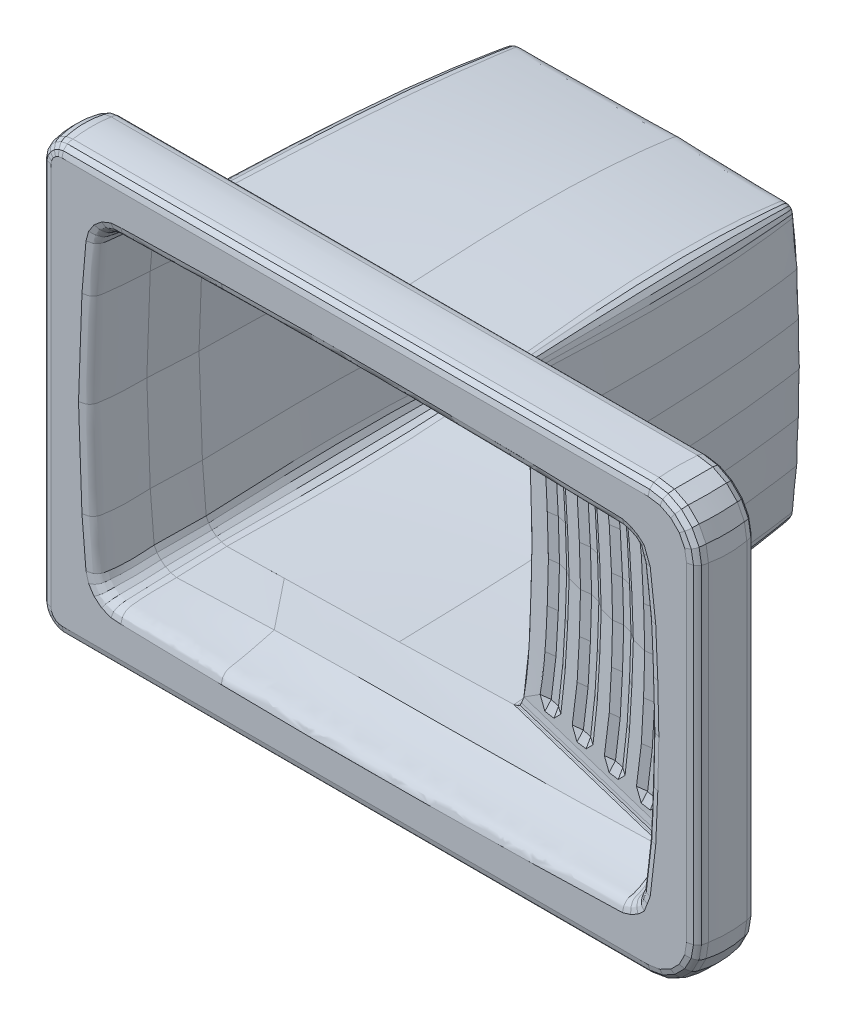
SolidWorks part; units mm, degrees
ref_plane "Alzado" through (0, 0, 0) normal (0, 0, 1) x (1, 0, 0)
ref_plane "Planta" through (0, 0, 0) normal (0, 1, 0) x (1, 0, 0)
ref_plane "Vista lateral" through (0, 0, 0) normal (1, 0, 0) x (0, 0, -1)
sketch3d "Croquis3D1"
  line L0 (16.9098, -184.5106, 305) -> (20, -185, 305)
  line L1 (20, -185, 305) -> (127, -185, 305)
  line L2 (127, -185, 305) -> (234, -185, 305)
  line L3 (234, -185, 305) -> (341, -185, 305)
  line L4 (341, -185, 305) -> (448, -185, 305)
  line L5 (448, -185, 305) -> (555, -185, 305)
  line L6 (555, -185, 305) -> (565.8156, -183.287, 305)
  line L7 (565.8156, -183.287, 305) -> (575.5725, -178.3156, 305)
  line L8 (575.5725, -178.3156, 305) -> (583.3156, -170.5725, 305)
  line L9 (583.3156, -170.5725, 305) -> (588.287, -160.8156, 305)
  line L10 (588.287, -160.8156, 305) -> (590, -150, 305)
  line L11 (590, -150, 305) -> (590, -100, 305)
  line L12 (590, -100, 305) -> (590, -50, 305)
  line L13 (590, -50, 305) -> (590, 0, 305)
  line L14 (590, 0, 305) -> (590, 50, 305)
  line L15 (590, 50, 305) -> (590, 100, 305)
  line L16 (590, 100, 305) -> (590, 150, 305)
  line L17 (590, 150, 305) -> (588.287, 160.8156, 305)
  line L18 (588.287, 160.8156, 305) -> (583.3156, 170.5725, 305)
  line L19 (583.3156, 170.5725, 305) -> (575.5725, 178.3156, 305)
  line L20 (575.5725, 178.3156, 305) -> (565.8156, 183.287, 305)
  line L21 (565.8156, 183.287, 305) -> (555, 185, 305)
  line L22 (555, 185, 305) -> (448, 185, 305)
  line L23 (448, 185, 305) -> (341, 185, 305)
  line L24 (341, 185, 305) -> (234, 185, 305)
  line L25 (234, 185, 305) -> (127, 185, 305)
  line L26 (127, 185, 305) -> (20, 185, 305)
  line L27 (20, 185, 305) -> (16.9098, 184.5106, 305)
  line L28 (16.9098, 184.5106, 305) -> (14.1221, 183.0902, 305)
  line L29 (14.1221, 183.0902, 305) -> (11.9098, 180.8779, 305)
  line L30 (11.9098, 180.8779, 305) -> (10.4894, 178.0902, 305)
  line L31 (10.4894, 178.0902, 305) -> (10, 175, 305)
  line L32 (10, 175, 305) -> (10, 116.6667, 305)
  line L33 (10, 116.6667, 305) -> (10, 58.3333, 305)
  line L34 (10, 58.3333, 305) -> (10, 0, 305)
  line L35 (10, 0, 305) -> (10, -58.3333, 305)
  line L36 (10, -58.3333, 305) -> (10, -116.6667, 305)
  line L37 (10, -116.6667, 305) -> (10, -175, 305)
  line L38 (10, -175, 305) -> (10.4894, -178.0902, 305)
  line L39 (10.4894, -178.0902, 305) -> (11.9098, -180.8779, 305)
  line L40 (11.9098, -180.8779, 305) -> (14.1221, -183.0902, 305)
  line L41 (14.1221, -183.0902, 305) -> (16.9098, -184.5106, 305)
sketch3d "Croquis3D2"
  line L0 (15.8583, -189.1333, 306.3397) -> (20, -190, 306.3397)
  line L1 (20, -190, 306.3397) -> (127, -190, 306.3397)
  line L2 (127, -190, 306.3397) -> (234, -190, 306.3397)
  line L3 (234, -190, 306.3397) -> (341, -190, 306.3397)
  line L4 (341, -190, 306.3397) -> (448, -190, 306.3397)
  line L5 (448, -190, 306.3397) -> (555, -190, 306.3397)
  line L6 (555, -190, 306.3397) -> (566.8671, -187.9097, 306.3397)
  line L7 (566.8671, -187.9097, 306.3397) -> (577.9438, -181.973, 306.3397)
  line L8 (577.9438, -181.973, 306.3397) -> (586.973, -172.9438, 306.3397)
  line L9 (586.973, -172.9438, 306.3397) -> (592.9097, -161.8671, 306.3397)
  line L10 (592.9097, -161.8671, 306.3397) -> (595, -150, 306.3397)
  line L11 (595, -150, 306.3397) -> (595, -100, 306.3397)
  line L12 (595, -100, 306.3397) -> (595, -50, 306.3397)
  line L13 (595, -50, 306.3397) -> (595, 0, 306.3397)
  line L14 (595, 0, 306.3397) -> (595, 50, 306.3397)
  line L15 (595, 50, 306.3397) -> (595, 100, 306.3397)
  line L16 (595, 100, 306.3397) -> (595, 150, 306.3397)
  line L17 (595, 150, 306.3397) -> (592.9097, 161.8671, 306.3397)
  line L18 (592.9097, 161.8671, 306.3397) -> (586.973, 172.9438, 306.3397)
  line L19 (586.973, 172.9438, 306.3397) -> (577.9438, 181.973, 306.3397)
  line L20 (577.9438, 181.973, 306.3397) -> (566.8671, 187.9097, 306.3397)
  line L21 (566.8671, 187.9097, 306.3397) -> (555, 190, 306.3397)
  line L22 (555, 190, 306.3397) -> (448, 190, 306.3397)
  line L23 (448, 190, 306.3397) -> (341, 190, 306.3397)
  line L24 (341, 190, 306.3397) -> (234, 190, 306.3397)
  line L25 (234, 190, 306.3397) -> (127, 190, 306.3397)
  line L26 (127, 190, 306.3397) -> (20, 190, 306.3397)
  line L27 (20, 190, 306.3397) -> (15.8583, 189.1333, 306.3397)
  line L28 (15.8583, 189.1333, 306.3397) -> (11.7509, 186.7476, 306.3397)
  line L29 (11.7509, 186.7476, 306.3397) -> (8.2524, 183.2491, 306.3397)
  line L30 (8.2524, 183.2491, 306.3397) -> (5.8667, 179.1417, 306.3397)
  line L31 (5.8667, 179.1417, 306.3397) -> (5, 175, 306.3397)
  line L32 (5, 175, 306.3397) -> (5, 116.6667, 306.3397)
  line L33 (5, 116.6667, 306.3397) -> (5, 58.3333, 306.3397)
  line L34 (5, 58.3333, 306.3397) -> (5, 0, 306.3397)
  line L35 (5, 0, 306.3397) -> (5, -58.3333, 306.3397)
  line L36 (5, -58.3333, 306.3397) -> (5, -116.6667, 306.3397)
  line L37 (5, -116.6667, 306.3397) -> (5, -175, 306.3397)
  line L38 (5, -175, 306.3397) -> (5.8667, -179.1417, 306.3397)
  line L39 (5.8667, -179.1417, 306.3397) -> (8.2524, -183.2491, 306.3397)
  line L40 (8.2524, -183.2491, 306.3397) -> (11.7509, -186.7476, 306.3397)
  line L41 (11.7509, -186.7476, 306.3397) -> (15.8583, -189.1333, 306.3397)
sketch3d "Croquis3D3"
  line L0 (14.4905, -192.678, 310) -> (20, -193.6603, 310)
  line L1 (20, -193.6603, 310) -> (127, -193.6603, 310)
  line L2 (127, -193.6603, 310) -> (234, -193.6603, 310)
  line L3 (234, -193.6603, 310) -> (341, -193.6603, 310)
  line L4 (341, -193.6603, 310) -> (448, -193.6603, 310)
  line L5 (448, -193.6603, 310) -> (555, -193.6603, 310)
  line L6 (555, -193.6603, 310) -> (568.2349, -191.4544, 310)
  line L7 (568.2349, -191.4544, 310) -> (580.3675, -185.1202, 310)
  line L8 (580.3675, -185.1202, 310) -> (590.1202, -175.3675, 310)
  line L9 (590.1202, -175.3675, 310) -> (596.4544, -163.2349, 310)
  line L10 (596.4544, -163.2349, 310) -> (598.6603, -150, 310)
  line L11 (598.6603, -150, 310) -> (598.6603, -100, 310)
  line L12 (598.6603, -100, 310) -> (598.6603, -50, 310)
  line L13 (598.6603, -50, 310) -> (598.6603, 0, 310)
  line L14 (598.6603, 0, 310) -> (598.6603, 50, 310)
  line L15 (598.6603, 50, 310) -> (598.6603, 100, 310)
  line L16 (598.6603, 100, 310) -> (598.6603, 150, 310)
  line L17 (598.6603, 150, 310) -> (596.4544, 163.2349, 310)
  line L18 (596.4544, 163.2349, 310) -> (590.1202, 175.3675, 310)
  line L19 (590.1202, 175.3675, 310) -> (580.3675, 185.1202, 310)
  line L20 (580.3675, 185.1202, 310) -> (568.2349, 191.4544, 310)
  line L21 (568.2349, 191.4544, 310) -> (555, 193.6603, 310)
  line L22 (555, 193.6603, 310) -> (448, 193.6603, 310)
  line L23 (448, 193.6603, 310) -> (341, 193.6603, 310)
  line L24 (341, 193.6603, 310) -> (234, 193.6603, 310)
  line L25 (234, 193.6603, 310) -> (127, 193.6603, 310)
  line L26 (127, 193.6603, 310) -> (20, 193.6603, 310)
  line L27 (20, 193.6603, 310) -> (14.4905, 192.678, 310)
  line L28 (14.4905, 192.678, 310) -> (9.3272, 189.8947, 310)
  line L29 (9.3272, 189.8947, 310) -> (5.1053, 185.6728, 310)
  line L30 (5.1053, 185.6728, 310) -> (2.322, 180.5095, 310)
  line L31 (2.322, 180.5095, 310) -> (1.3397, 175, 310)
  line L32 (1.3397, 175, 310) -> (1.3397, 116.6667, 310)
  line L33 (1.3397, 116.6667, 310) -> (1.3397, 58.3333, 310)
  line L34 (1.3397, 58.3333, 310) -> (1.3397, 0, 310)
  line L35 (1.3397, 0, 310) -> (1.3397, -58.3333, 310)
  line L36 (1.3397, -58.3333, 310) -> (1.3397, -116.6667, 310)
  line L37 (1.3397, -116.6667, 310) -> (1.3397, -175, 310)
  line L38 (1.3397, -175, 310) -> (2.322, -180.5095, 310)
  line L39 (2.322, -180.5095, 310) -> (5.1053, -185.6728, 310)
  line L40 (5.1053, -185.6728, 310) -> (9.3272, -189.8947, 310)
  line L41 (9.3272, -189.8947, 310) -> (14.4905, -192.678, 310)
sketch3d "Croquis3D4"
  line L0 (13.8197, -194.0211, 315) -> (20, -195, 315)
  line L1 (20, -195, 315) -> (127, -195, 315)
  line L2 (127, -195, 315) -> (234, -195, 315)
  line L3 (234, -195, 315) -> (341, -195, 315)
  line L4 (341, -195, 315) -> (448, -195, 315)
  line L5 (448, -195, 315) -> (555, -195, 315)
  line L6 (555, -195, 315) -> (568.9058, -192.7975, 315)
  line L7 (568.9058, -192.7975, 315) -> (581.4503, -186.4058, 315)
  line L8 (581.4503, -186.4058, 315) -> (591.4058, -176.4503, 315)
  line L9 (591.4058, -176.4503, 315) -> (597.7975, -163.9058, 315)
  line L10 (597.7975, -163.9058, 315) -> (600, -150, 315)
  line L11 (600, -150, 315) -> (600, -100, 315)
  line L12 (600, -100, 315) -> (600, -50, 315)
  line L13 (600, -50, 315) -> (600, 0, 315)
  line L14 (600, 0, 315) -> (600, 50, 315)
  line L15 (600, 50, 315) -> (600, 100, 315)
  line L16 (600, 100, 315) -> (600, 150, 315)
  line L17 (600, 150, 315) -> (597.7975, 163.9058, 315)
  line L18 (597.7975, 163.9058, 315) -> (591.4058, 176.4503, 315)
  line L19 (591.4058, 176.4503, 315) -> (581.4503, 186.4058, 315)
  line L20 (581.4503, 186.4058, 315) -> (568.9058, 192.7975, 315)
  line L21 (568.9058, 192.7975, 315) -> (555, 195, 315)
  line L22 (555, 195, 315) -> (448, 195, 315)
  line L23 (448, 195, 315) -> (341, 195, 315)
  line L24 (341, 195, 315) -> (234, 195, 315)
  line L25 (234, 195, 315) -> (127, 195, 315)
  line L26 (127, 195, 315) -> (20, 195, 315)
  line L27 (20, 195, 315) -> (13.8197, 194.0211, 315)
  line L28 (13.8197, 194.0211, 315) -> (8.2443, 191.1803, 315)
  line L29 (8.2443, 191.1803, 315) -> (3.8197, 186.7557, 315)
  line L30 (3.8197, 186.7557, 315) -> (0.9789, 181.1803, 315)
  line L31 (0.9789, 181.1803, 315) -> (0, 175, 315)
  line L32 (0, 175, 315) -> (0, 116.6667, 315)
  line L33 (0, 116.6667, 315) -> (0, 58.3333, 315)
  line L34 (0, 58.3333, 315) -> (0, 0, 315)
  line L35 (0, 0, 315) -> (0, -58.3333, 315)
  line L36 (0, -58.3333, 315) -> (0, -116.6667, 315)
  line L37 (0, -116.6667, 315) -> (0, -175, 315)
  line L38 (0, -175, 315) -> (0.9789, -181.1803, 315)
  line L39 (0.9789, -181.1803, 315) -> (3.8197, -186.7557, 315)
  line L40 (3.8197, -186.7557, 315) -> (8.2443, -191.1803, 315)
  line L41 (8.2443, -191.1803, 315) -> (13.8197, -194.0211, 315)
sketch3d "Croquis3D5"
  line L0 (13.8197, -194.0211, 350) -> (20, -195, 350)
  line L1 (20, -195, 350) -> (127, -195, 350)
  line L2 (127, -195, 350) -> (234, -195, 350)
  line L3 (234, -195, 350) -> (341, -195, 350)
  line L4 (341, -195, 350) -> (448, -195, 350)
  line L5 (448, -195, 350) -> (555, -195, 350)
  line L6 (555, -195, 350) -> (568.9058, -192.7975, 350)
  line L7 (568.9058, -192.7975, 350) -> (581.4503, -186.4058, 350)
  line L8 (581.4503, -186.4058, 350) -> (591.4058, -176.4503, 350)
  line L9 (591.4058, -176.4503, 350) -> (597.7975, -163.9058, 350)
  line L10 (597.7975, -163.9058, 350) -> (600, -150, 350)
  line L11 (600, -150, 350) -> (599.9857, -100, 350)
  line L12 (599.9857, -100, 350) -> (599.9715, -50, 350)
  line L13 (599.9715, -50, 350) -> (599.9572, 0, 350)
  line L14 (599.9572, 0, 350) -> (599.9715, 50, 350)
  line L15 (599.9715, 50, 350) -> (599.9857, 100, 350)
  line L16 (599.9857, 100, 350) -> (600, 150, 350)
  line L17 (600, 150, 350) -> (597.7975, 163.9058, 350)
  line L18 (597.7975, 163.9058, 350) -> (591.4058, 176.4503, 350)
  line L19 (591.4058, 176.4503, 350) -> (581.4503, 186.4058, 350)
  line L20 (581.4503, 186.4058, 350) -> (568.9058, 192.7975, 350)
  line L21 (568.9058, 192.7975, 350) -> (555, 195, 350)
  line L22 (555, 195, 350) -> (448, 195, 350)
  line L23 (448, 195, 350) -> (341, 195, 350)
  line L24 (341, 195, 350) -> (234, 195, 350)
  line L25 (234, 195, 350) -> (127, 195, 350)
  line L26 (127, 195, 350) -> (20, 195, 350)
  line L27 (20, 195, 350) -> (13.8197, 194.0211, 350)
  line L28 (13.8197, 194.0211, 350) -> (8.2443, 191.1803, 350)
  line L29 (8.2443, 191.1803, 350) -> (3.8197, 186.7557, 350)
  line L30 (3.8197, 186.7557, 350) -> (0.9789, 181.1803, 350)
  line L31 (0.9789, 181.1803, 350) -> (0, 175, 350)
  line L32 (0, 175, 350) -> (0, 116.6667, 350)
  line L33 (0, 116.6667, 350) -> (0, 58.3333, 350)
  line L34 (0, 58.3333, 350) -> (0, 0, 350)
  line L35 (0, 0, 350) -> (0, -58.3333, 350)
  line L36 (0, -58.3333, 350) -> (0, -116.6667, 350)
  line L37 (0, -116.6667, 350) -> (0, -175, 350)
  line L38 (0, -175, 350) -> (0.9789, -181.1803, 350)
  line L39 (0.9789, -181.1803, 350) -> (3.8197, -186.7557, 350)
  line L40 (3.8197, -186.7557, 350) -> (8.2443, -191.1803, 350)
  line L41 (8.2443, -191.1803, 350) -> (13.8197, -194.0211, 350)
sketch3d "Croquis3D6"
  line L0 (14.4905, -192.678, 355) -> (20, -193.6603, 355)
  line L1 (20, -193.6603, 355) -> (127, -193.6603, 355)
  line L2 (127, -193.6603, 355) -> (234, -193.6603, 355)
  line L3 (234, -193.6603, 355) -> (341, -193.6603, 355)
  line L4 (341, -193.6603, 355) -> (448, -193.6603, 355)
  line L5 (448, -193.6603, 355) -> (555, -193.6603, 355)
  line L6 (555, -193.6603, 355) -> (568.2349, -191.4544, 355)
  line L7 (568.2349, -191.4544, 355) -> (580.3675, -185.1202, 355)
  line L8 (580.3675, -185.1202, 355) -> (590.1202, -175.3675, 355)
  line L9 (590.1202, -175.3675, 355) -> (596.4544, -163.2349, 355)
  line L10 (596.4544, -163.2349, 355) -> (598.6603, -150, 355)
  line L11 (598.6603, -150, 355) -> (598.646, -100, 355)
  line L12 (598.646, -100, 355) -> (598.6317, -50, 355)
  line L13 (598.6317, -50, 355) -> (598.6175, 0, 355)
  line L14 (598.6175, 0, 355) -> (598.6317, 50, 355)
  line L15 (598.6317, 50, 355) -> (598.646, 100, 355)
  line L16 (598.646, 100, 355) -> (598.6603, 150, 355)
  line L17 (598.6603, 150, 355) -> (596.4544, 163.2349, 355)
  line L18 (596.4544, 163.2349, 355) -> (590.1202, 175.3675, 355)
  line L19 (590.1202, 175.3675, 355) -> (580.3675, 185.1202, 355)
  line L20 (580.3675, 185.1202, 355) -> (568.2349, 191.4544, 355)
  line L21 (568.2349, 191.4544, 355) -> (555, 193.6603, 355)
  line L22 (555, 193.6603, 355) -> (448, 193.6603, 355)
  line L23 (448, 193.6603, 355) -> (341, 193.6603, 355)
  line L24 (341, 193.6603, 355) -> (234, 193.6603, 355)
  line L25 (234, 193.6603, 355) -> (127, 193.6603, 355)
  line L26 (127, 193.6603, 355) -> (20, 193.6603, 355)
  line L27 (20, 193.6603, 355) -> (14.4905, 192.678, 355)
  line L28 (14.4905, 192.678, 355) -> (9.3272, 189.8947, 355)
  line L29 (9.3272, 189.8947, 355) -> (5.1053, 185.6728, 355)
  line L30 (5.1053, 185.6728, 355) -> (2.322, 180.5095, 355)
  line L31 (2.322, 180.5095, 355) -> (1.3397, 175, 355)
  line L32 (1.3397, 175, 355) -> (1.3397, 116.6667, 355)
  line L33 (1.3397, 116.6667, 355) -> (1.3397, 58.3333, 355)
  line L34 (1.3397, 58.3333, 355) -> (1.3397, 0, 355)
  line L35 (1.3397, 0, 355) -> (1.3397, -58.3333, 355)
  line L36 (1.3397, -58.3333, 355) -> (1.3397, -116.6667, 355)
  line L37 (1.3397, -116.6667, 355) -> (1.3397, -175, 355)
  line L38 (1.3397, -175, 355) -> (2.322, -180.5095, 355)
  line L39 (2.322, -180.5095, 355) -> (5.1053, -185.6728, 355)
  line L40 (5.1053, -185.6728, 355) -> (9.3272, -189.8947, 355)
  line L41 (9.3272, -189.8947, 355) -> (14.4905, -192.678, 355)
sketch3d "Croquis3D7"
  line L0 (15.8583, -189.1333, 358.6603) -> (20, -190, 358.6603)
  line L1 (20, -190, 358.6603) -> (127, -190, 358.6603)
  line L2 (127, -190, 358.6603) -> (234, -190, 358.6603)
  line L3 (234, -190, 358.6603) -> (341, -190, 358.6603)
  line L4 (341, -190, 358.6603) -> (448, -190, 358.6603)
  line L5 (448, -190, 358.6603) -> (555, -190, 358.6603)
  line L6 (555, -190, 358.6603) -> (566.8671, -187.9097, 358.6603)
  line L7 (566.8671, -187.9097, 358.6603) -> (577.9438, -181.973, 358.6603)
  line L8 (577.9438, -181.973, 358.6603) -> (586.973, -172.9438, 358.6603)
  line L9 (586.973, -172.9438, 358.6603) -> (592.9097, -161.8671, 358.6603)
  line L10 (592.9097, -161.8671, 358.6603) -> (595, -150, 358.6603)
  line L11 (595, -150, 358.6603) -> (594.9857, -100, 358.6603)
  line L12 (594.9857, -100, 358.6603) -> (594.9715, -50, 358.6603)
  line L13 (594.9715, -50, 358.6603) -> (594.9572, 0, 358.6603)
  line L14 (594.9572, 0, 358.6603) -> (594.9715, 50, 358.6603)
  line L15 (594.9715, 50, 358.6603) -> (594.9857, 100, 358.6603)
  line L16 (594.9857, 100, 358.6603) -> (595, 150, 358.6603)
  line L17 (595, 150, 358.6603) -> (592.9097, 161.8671, 358.6603)
  line L18 (592.9097, 161.8671, 358.6603) -> (586.973, 172.9438, 358.6603)
  line L19 (586.973, 172.9438, 358.6603) -> (577.9438, 181.973, 358.6603)
  line L20 (577.9438, 181.973, 358.6603) -> (566.8671, 187.9097, 358.6603)
  line L21 (566.8671, 187.9097, 358.6603) -> (555, 190, 358.6603)
  line L22 (555, 190, 358.6603) -> (448, 190, 358.6603)
  line L23 (448, 190, 358.6603) -> (341, 190, 358.6603)
  line L24 (341, 190, 358.6603) -> (234, 190, 358.6603)
  line L25 (234, 190, 358.6603) -> (127, 190, 358.6603)
  line L26 (127, 190, 358.6603) -> (20, 190, 358.6603)
  line L27 (20, 190, 358.6603) -> (15.8583, 189.1333, 358.6603)
  line L28 (15.8583, 189.1333, 358.6603) -> (11.7509, 186.7476, 358.6603)
  line L29 (11.7509, 186.7476, 358.6603) -> (8.2524, 183.2491, 358.6603)
  line L30 (8.2524, 183.2491, 358.6603) -> (5.8667, 179.1417, 358.6603)
  line L31 (5.8667, 179.1417, 358.6603) -> (5, 175, 358.6603)
  line L32 (5, 175, 358.6603) -> (5, 116.6667, 358.6603)
  line L33 (5, 116.6667, 358.6603) -> (5, 58.3333, 358.6603)
  line L34 (5, 58.3333, 358.6603) -> (5, 0, 358.6603)
  line L35 (5, 0, 358.6603) -> (5, -58.3333, 358.6603)
  line L36 (5, -58.3333, 358.6603) -> (5, -116.6667, 358.6603)
  line L37 (5, -116.6667, 358.6603) -> (5, -175, 358.6603)
  line L38 (5, -175, 358.6603) -> (5.8667, -179.1417, 358.6603)
  line L39 (5.8667, -179.1417, 358.6603) -> (8.2524, -183.2491, 358.6603)
  line L40 (8.2524, -183.2491, 358.6603) -> (11.7509, -186.7476, 358.6603)
  line L41 (11.7509, -186.7476, 358.6603) -> (15.8583, -189.1333, 358.6603)
sketch3d "Croquis3D8"
  line L0 (16.9098, -184.5106, 360) -> (20, -185, 360)
  line L1 (20, -185, 360) -> (127, -185, 360)
  line L2 (127, -185, 360) -> (234, -185, 360)
  line L3 (234, -185, 360) -> (341, -185, 360)
  line L4 (341, -185, 360) -> (448, -185, 360)
  line L5 (448, -185, 360) -> (555, -185, 360)
  line L6 (555, -185, 360) -> (565.8156, -183.287, 360)
  line L7 (565.8156, -183.287, 360) -> (575.5725, -178.3156, 360)
  line L8 (575.5725, -178.3156, 360) -> (583.3156, -170.5725, 360)
  line L9 (583.3156, -170.5725, 360) -> (588.287, -160.8156, 360)
  line L10 (588.287, -160.8156, 360) -> (590, -150, 360)
  line L11 (590, -150, 360) -> (589.9857, -100, 360)
  line L12 (589.9857, -100, 360) -> (589.9715, -50, 360)
  line L13 (589.9715, -50, 360) -> (589.9572, 0, 360)
  line L14 (589.9572, 0, 360) -> (589.9715, 50, 360)
  line L15 (589.9715, 50, 360) -> (589.9857, 100, 360)
  line L16 (589.9857, 100, 360) -> (590, 150, 360)
  line L17 (590, 150, 360) -> (588.287, 160.8156, 360)
  line L18 (588.287, 160.8156, 360) -> (583.3156, 170.5725, 360)
  line L19 (583.3156, 170.5725, 360) -> (575.5725, 178.3156, 360)
  line L20 (575.5725, 178.3156, 360) -> (565.8156, 183.287, 360)
  line L21 (565.8156, 183.287, 360) -> (555, 185, 360)
  line L22 (555, 185, 360) -> (448, 185, 360)
  line L23 (448, 185, 360) -> (341, 185, 360)
  line L24 (341, 185, 360) -> (234, 185, 360)
  line L25 (234, 185, 360) -> (127, 185, 360)
  line L26 (127, 185, 360) -> (20, 185, 360)
  line L27 (20, 185, 360) -> (16.9098, 184.5106, 360)
  line L28 (16.9098, 184.5106, 360) -> (14.1221, 183.0902, 360)
  line L29 (14.1221, 183.0902, 360) -> (11.9098, 180.8779, 360)
  line L30 (11.9098, 180.8779, 360) -> (10.4894, 178.0902, 360)
  line L31 (10.4894, 178.0902, 360) -> (10, 175, 360)
  line L32 (10, 175, 360) -> (10, 116.6667, 360)
  line L33 (10, 116.6667, 360) -> (10, 58.3333, 360)
  line L34 (10, 58.3333, 360) -> (10, 0, 360)
  line L35 (10, 0, 360) -> (10, -58.3333, 360)
  line L36 (10, -58.3333, 360) -> (10, -116.6667, 360)
  line L37 (10, -116.6667, 360) -> (10, -175, 360)
  line L38 (10, -175, 360) -> (10.4894, -178.0902, 360)
  line L39 (10.4894, -178.0902, 360) -> (11.9098, -180.8779, 360)
  line L40 (11.9098, -180.8779, 360) -> (14.1221, -183.0902, 360)
  line L41 (14.1221, -183.0902, 360) -> (16.9098, -184.5106, 360)
sketch3d "Croquis3D9"
  line L0 (16.9098, -184.5106, 360) -> (15.8583, -189.1333, 358.6603)
  line L1 (15.8583, -189.1333, 358.6603) -> (14.4905, -192.678, 355)
  line L2 (14.4905, -192.678, 355) -> (13.8197, -194.0211, 350)
  line L3 (13.8197, -194.0211, 350) -> (13.8197, -194.0211, 315)
  line L4 (13.8197, -194.0211, 315) -> (14.4905, -192.678, 310)
  line L5 (14.4905, -192.678, 310) -> (15.8583, -189.1333, 306.3397)
  line L6 (15.8583, -189.1333, 306.3397) -> (16.9098, -184.5106, 305)
sketch3d "Croquis3D10"
  line L0 (565.8156, 183.287, 360) -> (566.8671, 187.9097, 358.6603)
  line L1 (566.8671, 187.9097, 358.6603) -> (568.2349, 191.4544, 355)
  line L2 (568.2349, 191.4544, 355) -> (568.9058, 192.7975, 350)
  line L3 (568.9058, 192.7975, 350) -> (568.9058, 192.7975, 315)
  line L4 (568.9058, 192.7975, 315) -> (568.2349, 191.4544, 310)
  line L5 (568.2349, 191.4544, 310) -> (566.8671, 187.9097, 306.3397)
  line L6 (566.8671, 187.9097, 306.3397) -> (565.8156, 183.287, 305)
surface "Superficie-Recubrir1"
sketch3d "Croquis3D11"
  line L0 (16.9098, -184.5106, 360) -> (20, -185, 360)
  line L1 (20, -185, 360) -> (127, -185, 360)
  line L2 (127, -185, 360) -> (234, -185, 360)
  line L3 (234, -185, 360) -> (341, -185, 360)
  line L4 (341, -185, 360) -> (448, -185, 360)
  line L5 (448, -185, 360) -> (555, -185, 360)
  line L6 (555, -185, 360) -> (565.8156, -183.287, 360)
  line L7 (565.8156, -183.287, 360) -> (575.5725, -178.3156, 360)
  line L8 (575.5725, -178.3156, 360) -> (583.3156, -170.5725, 360)
  line L9 (583.3156, -170.5725, 360) -> (588.287, -160.8156, 360)
  line L10 (588.287, -160.8156, 360) -> (590, -150, 360)
  line L11 (590, -150, 360) -> (589.9857, -100, 360)
  line L12 (589.9857, -100, 360) -> (589.9715, -50, 360)
  line L13 (589.9715, -50, 360) -> (589.9572, 0, 360)
  line L14 (589.9572, 0, 360) -> (589.9715, 50, 360)
  line L15 (589.9715, 50, 360) -> (589.9857, 100, 360)
  line L16 (589.9857, 100, 360) -> (590, 150, 360)
  line L17 (590, 150, 360) -> (588.287, 160.8156, 360)
  line L18 (588.287, 160.8156, 360) -> (583.3156, 170.5725, 360)
  line L19 (583.3156, 170.5725, 360) -> (575.5725, 178.3156, 360)
  line L20 (575.5725, 178.3156, 360) -> (565.8156, 183.287, 360)
  line L21 (565.8156, 183.287, 360) -> (555, 185, 360)
  line L22 (555, 185, 360) -> (448, 185, 360)
  line L23 (448, 185, 360) -> (341, 185, 360)
  line L24 (341, 185, 360) -> (234, 185, 360)
  line L25 (234, 185, 360) -> (127, 185, 360)
  line L26 (127, 185, 360) -> (20, 185, 360)
  line L27 (20, 185, 360) -> (16.9098, 184.5106, 360)
  line L28 (16.9098, 184.5106, 360) -> (14.1221, 183.0902, 360)
  line L29 (14.1221, 183.0902, 360) -> (11.9098, 180.8779, 360)
  line L30 (11.9098, 180.8779, 360) -> (10.4894, 178.0902, 360)
  line L31 (10.4894, 178.0902, 360) -> (10, 175, 360)
  line L32 (10, 175, 360) -> (10, 116.6667, 360)
  line L33 (10, 116.6667, 360) -> (10, 58.3333, 360)
  line L34 (10, 58.3333, 360) -> (10, 0, 360)
  line L35 (10, 0, 360) -> (10, -58.3333, 360)
  line L36 (10, -58.3333, 360) -> (10, -116.6667, 360)
  line L37 (10, -116.6667, 360) -> (10, -175, 360)
  line L38 (10, -175, 360) -> (10.4894, -178.0902, 360)
  line L39 (10.4894, -178.0902, 360) -> (11.9098, -180.8779, 360)
  line L40 (11.9098, -180.8779, 360) -> (14.1221, -183.0902, 360)
  line L41 (14.1221, -183.0902, 360) -> (16.9098, -184.5106, 360)
sketch3d "Croquis3D12"
  line L0 (64.6912, -155.9847, 360) -> (73.7457, -156.6808, 360)
  line L1 (73.7457, -156.6808, 360) -> (165.302, -158.5643, 360)
  line L2 (165.302, -158.5643, 360) -> (256.8672, -159.6817, 360)
  line L3 (256.8672, -159.6817, 360) -> (348.4409, -159.405, 360)
  line L4 (348.4409, -159.405, 360) -> (440.0068, -158.1979, 360)
  line L5 (440.0068, -158.1979, 360) -> (531.5463, -155.6493, 360)
  line L6 (531.5463, -155.6493, 360) -> (538.9662, -153.468, 360)
  line L7 (538.9662, -153.468, 360) -> (545.6084, -149.7694, 360)
  line L8 (545.6084, -149.7694, 360) -> (551.3307, -144.7371, 360)
  line L9 (551.3307, -144.7371, 360) -> (554.0949, -137.514, 360)
  line L10 (554.0949, -137.514, 360) -> (556.8592, -130.291, 360)
  line L11 (556.8592, -130.291, 360) -> (561.8977, -87.0586, 360)
  line L12 (561.8977, -87.0586, 360) -> (563.7824, -43.5495, 360)
  line L13 (563.7824, -43.5495, 360) -> (564.7399, 0, 360)
  line L14 (564.7399, 0, 360) -> (563.7824, 43.5495, 360)
  line L15 (563.7824, 43.5495, 360) -> (561.8977, 87.0586, 360)
  line L16 (561.8977, 87.0586, 360) -> (556.8592, 130.291, 360)
  line L17 (556.8592, 130.291, 360) -> (554.0949, 137.514, 360)
  line L18 (554.0949, 137.514, 360) -> (551.3307, 144.7371, 360)
  line L19 (551.3307, 144.7371, 360) -> (545.6084, 149.7694, 360)
  line L20 (545.6084, 149.7694, 360) -> (538.9662, 153.468, 360)
  line L21 (538.9662, 153.468, 360) -> (531.5463, 155.6493, 360)
  line L22 (531.5463, 155.6493, 360) -> (440.0068, 158.1979, 360)
  line L23 (440.0068, 158.1979, 360) -> (348.4409, 159.405, 360)
  line L24 (348.4409, 159.405, 360) -> (256.8672, 159.6817, 360)
  line L25 (256.8672, 159.6817, 360) -> (165.302, 158.5643, 360)
  line L26 (165.302, 158.5643, 360) -> (73.7457, 156.6808, 360)
  line L27 (73.7457, 156.6808, 360) -> (64.6912, 155.9847, 360)
  line L28 (64.6912, 155.9847, 360) -> (56.2693, 152.5879, 360)
  line L29 (56.2693, 152.5879, 360) -> (49.2656, 146.8073, 360)
  line L30 (49.2656, 146.8073, 360) -> (44.3335, 139.1822, 360)
  line L31 (44.3335, 139.1822, 360) -> (41.9331, 130.424, 360)
  line L32 (41.9331, 130.424, 360) -> (38.2516, 87.0455, 360)
  line L33 (38.2516, 87.0455, 360) -> (36.6786, 43.5227, 360)
  line L34 (36.6786, 43.5227, 360) -> (35.1055, 0, 360)
  line L35 (35.1055, 0, 360) -> (36.6786, -43.5227, 360)
  line L36 (36.6786, -43.5227, 360) -> (38.2516, -87.0455, 360)
  line L37 (38.2516, -87.0455, 360) -> (41.9331, -130.424, 360)
  line L38 (41.9331, -130.424, 360) -> (44.3335, -139.1822, 360)
  line L39 (44.3335, -139.1822, 360) -> (49.2656, -146.8073, 360)
  line L40 (49.2656, -146.8073, 360) -> (56.2693, -152.5879, 360)
  line L41 (56.2693, -152.5879, 360) -> (64.6912, -155.9847, 360)
surface "Superficie-Recubrir2"
sketch3d "Croquis3D13"
  line L0 (64.6912, -155.9847, 360) -> (73.7457, -156.6808, 360)
  line L1 (73.7457, -156.6808, 360) -> (165.302, -158.5643, 360)
  line L2 (165.302, -158.5643, 360) -> (256.8672, -159.6817, 360)
  line L3 (256.8672, -159.6817, 360) -> (348.4409, -159.405, 360)
  line L4 (348.4409, -159.405, 360) -> (440.0068, -158.1979, 360)
  line L5 (440.0068, -158.1979, 360) -> (531.5463, -155.6493, 360)
  line L6 (531.5463, -155.6493, 360) -> (538.9662, -153.468, 360)
  line L7 (538.9662, -153.468, 360) -> (545.6084, -149.7694, 360)
  line L8 (545.6084, -149.7694, 360) -> (551.3307, -144.7371, 360)
  line L9 (551.3307, -144.7371, 360) -> (554.0949, -137.514, 360)
  line L10 (554.0949, -137.514, 360) -> (556.8592, -130.291, 360)
  line L11 (556.8592, -130.291, 360) -> (561.8977, -87.0586, 360)
  line L12 (561.8977, -87.0586, 360) -> (563.7824, -43.5495, 360)
  line L13 (563.7824, -43.5495, 360) -> (564.7399, 0, 360)
  line L14 (564.7399, 0, 360) -> (563.7824, 43.5495, 360)
  line L15 (563.7824, 43.5495, 360) -> (561.8977, 87.0586, 360)
  line L16 (561.8977, 87.0586, 360) -> (556.8592, 130.291, 360)
  line L17 (556.8592, 130.291, 360) -> (554.0949, 137.514, 360)
  line L18 (554.0949, 137.514, 360) -> (551.3307, 144.7371, 360)
  line L19 (551.3307, 144.7371, 360) -> (545.6084, 149.7694, 360)
  line L20 (545.6084, 149.7694, 360) -> (538.9662, 153.468, 360)
  line L21 (538.9662, 153.468, 360) -> (531.5463, 155.6493, 360)
  line L22 (531.5463, 155.6493, 360) -> (440.0068, 158.1979, 360)
  line L23 (440.0068, 158.1979, 360) -> (348.4409, 159.405, 360)
  line L24 (348.4409, 159.405, 360) -> (256.8672, 159.6817, 360)
  line L25 (256.8672, 159.6817, 360) -> (165.302, 158.5643, 360)
  line L26 (165.302, 158.5643, 360) -> (73.7457, 156.6808, 360)
  line L27 (73.7457, 156.6808, 360) -> (64.6912, 155.9847, 360)
  line L28 (64.6912, 155.9847, 360) -> (56.2693, 152.5879, 360)
  line L29 (56.2693, 152.5879, 360) -> (49.2656, 146.8073, 360)
  line L30 (49.2656, 146.8073, 360) -> (44.3335, 139.1822, 360)
  line L31 (44.3335, 139.1822, 360) -> (41.9331, 130.424, 360)
  line L32 (41.9331, 130.424, 360) -> (38.2516, 87.0455, 360)
  line L33 (38.2516, 87.0455, 360) -> (36.6786, 43.5227, 360)
  line L34 (36.6786, 43.5227, 360) -> (35.1055, 0, 360)
  line L35 (35.1055, 0, 360) -> (36.6786, -43.5227, 360)
  line L36 (36.6786, -43.5227, 360) -> (38.2516, -87.0455, 360)
  line L37 (38.2516, -87.0455, 360) -> (41.9331, -130.424, 360)
  line L38 (41.9331, -130.424, 360) -> (44.3335, -139.1822, 360)
  line L39 (44.3335, -139.1822, 360) -> (49.2656, -146.8073, 360)
  line L40 (49.2656, -146.8073, 360) -> (56.2693, -152.5879, 360)
  line L41 (56.2693, -152.5879, 360) -> (64.6912, -155.9847, 360)
sketch3d "Croquis3D14"
  line L0 (65.7791, -151.2595, 358.6603) -> (73.7457, -151.6808, 358.6603)
  line L1 (73.7457, -151.6808, 358.6603) -> (165.302, -153.564, 358.6603)
  line L2 (165.302, -153.564, 358.6603) -> (256.8672, -154.6817, 358.6603)
  line L3 (256.8672, -154.6817, 358.6603) -> (348.4409, -154.4049, 358.6603)
  line L4 (348.4409, -154.4049, 358.6603) -> (440.0068, -153.1971, 358.6603)
  line L5 (440.0068, -153.1971, 358.6603) -> (531.5463, -150.6493, 358.6603)
  line L6 (531.5463, -150.6493, 358.6603) -> (537.9086, -148.8745, 358.6603)
  line L7 (537.9086, -148.8745, 358.6603) -> (543.2324, -146.1138, 358.6603)
  line L8 (543.2324, -146.1138, 358.6603) -> (547.6166, -142.3046, 358.6603)
  line L9 (547.6166, -142.3046, 358.6603) -> (549.5646, -136.4711, 358.6603)
  line L10 (549.5646, -136.4711, 358.6603) -> (551.8592, -130.291, 358.6603)
  line L11 (551.8592, -130.291, 358.6603) -> (556.8922, -87.0574, 358.6603)
  line L12 (556.8922, -87.0574, 358.6603) -> (558.782, -43.549, 358.6603)
  line L13 (558.782, -43.549, 358.6603) -> (559.7399, 0, 358.6603)
  line L14 (559.7399, 0, 358.6603) -> (558.782, 43.549, 358.6603)
  line L15 (558.782, 43.549, 358.6603) -> (556.8922, 87.0574, 358.6603)
  line L16 (556.8922, 87.0574, 358.6603) -> (551.8592, 130.291, 358.6603)
  line L17 (551.8592, 130.291, 358.6603) -> (549.5646, 136.4711, 358.6603)
  line L18 (549.5646, 136.4711, 358.6603) -> (547.6166, 142.3046, 358.6603)
  line L19 (547.6166, 142.3046, 358.6603) -> (543.2324, 146.1138, 358.6603)
  line L20 (543.2324, 146.1138, 358.6603) -> (537.9086, 148.8745, 358.6603)
  line L21 (537.9086, 148.8745, 358.6603) -> (531.5463, 150.6493, 358.6603)
  line L22 (531.5463, 150.6493, 358.6603) -> (440.0068, 153.1971, 358.6603)
  line L23 (440.0068, 153.1971, 358.6603) -> (348.4409, 154.4049, 358.6603)
  line L24 (348.4409, 154.4049, 358.6603) -> (256.8672, 154.6817, 358.6603)
  line L25 (256.8672, 154.6817, 358.6603) -> (165.302, 153.564, 358.6603)
  line L26 (165.302, 153.564, 358.6603) -> (73.7457, 151.6808, 358.6603)
  line L27 (73.7457, 151.6808, 358.6603) -> (65.7791, 151.2595, 358.6603)
  line L28 (65.7791, 151.2595, 358.6603) -> (58.7233, 148.789, 358.6603)
  line L29 (58.7233, 148.789, 358.6603) -> (53.0308, 144.3126, 358.6603)
  line L30 (53.0308, 144.3126, 358.6603) -> (49.0418, 138.0636, 358.6603)
  line L31 (49.0418, 138.0636, 358.6603) -> (46.9331, 130.424, 358.6603)
  line L32 (46.9331, 130.424, 358.6603) -> (43.2531, 87.0451, 358.6603)
  line L33 (43.2531, 87.0451, 358.6603) -> (41.6793, 43.5225, 358.6603)
  line L34 (41.6793, 43.5225, 358.6603) -> (40.1055, 0, 358.6603)
  line L35 (40.1055, 0, 358.6603) -> (41.6793, -43.5225, 358.6603)
  line L36 (41.6793, -43.5225, 358.6603) -> (43.2531, -87.0451, 358.6603)
  line L37 (43.2531, -87.0451, 358.6603) -> (46.9331, -130.424, 358.6603)
  line L38 (46.9331, -130.424, 358.6603) -> (49.0418, -138.0636, 358.6603)
  line L39 (49.0418, -138.0636, 358.6603) -> (53.0308, -144.3126, 358.6603)
  line L40 (53.0308, -144.3126, 358.6603) -> (58.7233, -148.789, 358.6603)
  line L41 (58.7233, -148.789, 358.6603) -> (65.7791, -151.2595, 358.6603)
sketch3d "Croquis3D15"
  line L0 (67.2143, -147.5246, 355) -> (73.7457, -148.0206, 355)
  line L1 (73.7457, -148.0206, 355) -> (165.3021, -149.9031, 355)
  line L2 (165.3021, -149.9031, 355) -> (256.8672, -151.0214, 355)
  line L3 (256.8672, -151.0214, 355) -> (348.4408, -150.7444, 355)
  line L4 (348.4408, -150.7444, 355) -> (440.0067, -149.5352, 355)
  line L5 (440.0067, -149.5352, 355) -> (531.5463, -146.9891, 355)
  line L6 (531.5463, -146.9891, 355) -> (536.5294, -145.384, 355)
  line L7 (536.5294, -145.384, 355) -> (540.8, -142.9701, 355)
  line L8 (540.8, -142.9701, 355) -> (544.3644, -139.7674, 355)
  line L9 (544.3644, -139.7674, 355) -> (546.1914, -135.1194, 355)
  line L10 (546.1914, -135.1194, 355) -> (548.1989, -130.291, 355)
  line L11 (548.1989, -130.291, 355) -> (553.2218, -87.0552, 355)
  line L12 (553.2218, -87.0552, 355) -> (555.121, -43.5481, 355)
  line L13 (555.121, -43.5481, 355) -> (556.0797, 0, 355)
  line L14 (556.0797, 0, 355) -> (555.121, 43.5481, 355)
  line L15 (555.121, 43.5481, 355) -> (553.2218, 87.0552, 355)
  line L16 (553.2218, 87.0552, 355) -> (548.1989, 130.291, 355)
  line L17 (548.1989, 130.291, 355) -> (546.1914, 135.1194, 355)
  line L18 (546.1914, 135.1194, 355) -> (544.3644, 139.7674, 355)
  line L19 (544.3644, 139.7674, 355) -> (540.8, 142.9701, 355)
  line L20 (540.8, 142.9701, 355) -> (536.5294, 145.384, 355)
  line L21 (536.5294, 145.384, 355) -> (531.5463, 146.9891, 355)
  line L22 (531.5463, 146.9891, 355) -> (440.0067, 149.5352, 355)
  line L23 (440.0067, 149.5352, 355) -> (348.4408, 150.7444, 355)
  line L24 (348.4408, 150.7444, 355) -> (256.8672, 151.0214, 355)
  line L25 (256.8672, 151.0214, 355) -> (165.3021, 149.9031, 355)
  line L26 (165.3021, 149.9031, 355) -> (73.7457, 148.0206, 355)
  line L27 (73.7457, 148.0206, 355) -> (67.2143, 147.5246, 355)
  line L28 (67.2143, 147.5246, 355) -> (61.3005, 145.3793, 355)
  line L29 (61.3005, 145.3793, 355) -> (56.378, 141.6597, 355)
  line L30 (56.378, 141.6597, 355) -> (52.7455, 136.5713, 355)
  line L31 (52.7455, 136.5713, 355) -> (50.5934, 130.424, 355)
  line L32 (50.5934, 130.424, 355) -> (46.9162, 87.0444, 355)
  line L33 (46.9162, 87.0444, 355) -> (45.341, 43.5222, 355)
  line L34 (45.341, 43.5222, 355) -> (43.7658, 0, 355)
  line L35 (43.7658, 0, 355) -> (45.341, -43.5222, 355)
  line L36 (45.341, -43.5222, 355) -> (46.9162, -87.0444, 355)
  line L37 (46.9162, -87.0444, 355) -> (50.5934, -130.424, 355)
  line L38 (50.5934, -130.424, 355) -> (52.7455, -136.5713, 355)
  line L39 (52.7455, -136.5713, 355) -> (56.378, -141.6597, 355)
  line L40 (56.378, -141.6597, 355) -> (61.3005, -145.3793, 355)
  line L41 (61.3005, -145.3793, 355) -> (67.2143, -147.5246, 355)
sketch3d "Croquis3D16"
  line L0 (67.9214, -146.0791, 350) -> (73.7457, -146.6808, 350)
  line L1 (73.7457, -146.6808, 350) -> (165.3021, -148.563, 350)
  line L2 (165.3021, -148.563, 350) -> (256.8672, -149.6817, 350)
  line L3 (256.8672, -149.6817, 350) -> (348.4408, -149.4046, 350)
  line L4 (348.4408, -149.4046, 350) -> (440.0067, -148.1946, 350)
  line L5 (440.0067, -148.1946, 350) -> (531.5463, -145.6493, 350)
  line L6 (531.5463, -145.6493, 350) -> (535.8525, -144.07, 350)
  line L7 (535.8525, -144.07, 350) -> (539.7125, -141.6863, 350)
  line L8 (539.7125, -141.6863, 350) -> (543.0222, -138.6234, 350)
  line L9 (543.0222, -138.6234, 350) -> (544.9407, -134.4572, 350)
  line L10 (544.9407, -134.4572, 350) -> (546.8592, -130.291, 350)
  line L11 (546.8592, -130.291, 350) -> (551.8766, -87.054, 350)
  line L12 (551.8766, -87.054, 350) -> (553.7809, -43.5476, 350)
  line L13 (553.7809, -43.5476, 350) -> (554.7399, 0, 350)
  line L14 (554.7399, 0, 350) -> (553.7809, 43.5476, 350)
  line L15 (553.7809, 43.5476, 350) -> (551.8766, 87.054, 350)
  line L16 (551.8766, 87.054, 350) -> (546.8592, 130.291, 350)
  line L17 (546.8592, 130.291, 350) -> (544.9407, 134.4572, 350)
  line L18 (544.9407, 134.4572, 350) -> (543.0222, 138.6234, 350)
  line L19 (543.0222, 138.6234, 350) -> (539.7125, 141.6863, 350)
  line L20 (539.7125, 141.6863, 350) -> (535.8525, 144.07, 350)
  line L21 (535.8525, 144.07, 350) -> (531.5463, 145.6493, 350)
  line L22 (531.5463, 145.6493, 350) -> (440.0067, 148.1946, 350)
  line L23 (440.0067, 148.1946, 350) -> (348.4408, 149.4046, 350)
  line L24 (348.4408, 149.4046, 350) -> (256.8672, 149.6817, 350)
  line L25 (256.8672, 149.6817, 350) -> (165.3021, 148.563, 350)
  line L26 (165.3021, 148.563, 350) -> (73.7457, 146.6808, 350)
  line L27 (73.7457, 146.6808, 350) -> (67.9214, 146.0791, 350)
  line L28 (67.9214, 146.0791, 350) -> (62.4661, 143.9524, 350)
  line L29 (62.4661, 143.9524, 350) -> (57.7714, 140.4534, 350)
  line L30 (57.7714, 140.4534, 350) -> (54.1743, 135.8334, 350)
  line L31 (54.1743, 135.8334, 350) -> (51.9331, 130.424, 350)
  line L32 (51.9331, 130.424, 350) -> (48.2574, 87.0441, 350)
  line L33 (48.2574, 87.0441, 350) -> (46.6815, 43.522, 350)
  line L34 (46.6815, 43.522, 350) -> (45.1055, 0, 350)
  line L35 (45.1055, 0, 350) -> (46.6815, -43.522, 350)
  line L36 (46.6815, -43.522, 350) -> (48.2574, -87.0441, 350)
  line L37 (48.2574, -87.0441, 350) -> (51.9331, -130.424, 350)
  line L38 (51.9331, -130.424, 350) -> (54.1743, -135.8334, 350)
  line L39 (54.1743, -135.8334, 350) -> (57.7714, -140.4534, 350)
  line L40 (57.7714, -140.4534, 350) -> (62.4661, -143.9524, 350)
  line L41 (62.4661, -143.9524, 350) -> (67.9214, -146.0791, 350)
sketch3d "Croquis3D17"
  line L0 (69.3726, -143.0576, 310) -> (74.5731, -144.3219, 310)
  line L1 (74.5731, -144.3219, 310) -> (163.7588, -141.1416, 310)
  line L2 (163.7588, -141.1416, 310) -> (252.9734, -139.6904, 310)
  line L3 (252.9734, -139.6904, 310) -> (342.2136, -139.3899, 310)
  line L4 (342.2136, -139.3899, 310) -> (431.4465, -138.2147, 310)
  line L5 (431.4465, -138.2147, 310) -> (520.6543, -135.7555, 310)
  line L6 (520.6543, -135.7555, 310) -> (523.5761, -134.8965, 310)
  line L7 (523.5761, -134.8965, 310) -> (526.2438, -133.5416, 310)
  line L8 (526.2438, -133.5416, 310) -> (527.5697, -130.8732, 310)
  line L9 (527.5697, -130.8732, 310) -> (528.6583, -128.0289, 310)
  line L10 (528.6583, -128.0289, 310) -> (529.7468, -125.1846, 310)
  line L11 (529.7468, -125.1846, 310) -> (534.4266, -83.6362, 310)
  line L12 (534.4266, -83.6362, 310) -> (536.1641, -41.8359, 310)
  line L13 (536.1641, -41.8359, 310) -> (537.0854, 0, 310)
  line L14 (537.0854, 0, 310) -> (536.1641, 41.8359, 310)
  line L15 (536.1641, 41.8359, 310) -> (534.4266, 83.6362, 310)
  line L16 (534.4266, 83.6362, 310) -> (529.7468, 125.1846, 310)
  line L17 (529.7468, 125.1846, 310) -> (528.6583, 128.0289, 310)
  line L18 (528.6583, 128.0289, 310) -> (527.5697, 130.8732, 310)
  line L19 (527.5697, 130.8732, 310) -> (526.2438, 133.5416, 310)
  line L20 (526.2438, 133.5416, 310) -> (523.5761, 134.8965, 310)
  line L21 (523.5761, 134.8965, 310) -> (520.6543, 135.7555, 310)
  line L22 (520.6543, 135.7555, 310) -> (431.4465, 138.2147, 310)
  line L23 (431.4465, 138.2147, 310) -> (342.2136, 139.3899, 310)
  line L24 (342.2136, 139.3899, 310) -> (252.9734, 139.6904, 310)
  line L25 (252.9734, 139.6904, 310) -> (163.7588, 141.1416, 310)
  line L26 (163.7588, 141.1416, 310) -> (74.5731, 144.3219, 310)
  line L27 (74.5731, 144.3219, 310) -> (69.3726, 143.0576, 310)
  line L28 (69.3726, 143.0576, 310) -> (64.5394, 140.759, 310)
  line L29 (64.5394, 140.759, 310) -> (60.2766, 137.5228, 310)
  line L30 (60.2766, 137.5228, 310) -> (56.7637, 133.4851, 310)
  line L31 (56.7637, 133.4851, 310) -> (54.1483, 128.8158, 310)
  line L32 (54.1483, 128.8158, 310) -> (50.5729, 85.9678, 310)
  line L33 (50.5729, 85.9678, 310) -> (49.0165, 42.9839, 310)
  line L34 (49.0165, 42.9839, 310) -> (47.46, 0, 310)
  line L35 (47.46, 0, 310) -> (49.0165, -42.9839, 310)
  line L36 (49.0165, -42.9839, 310) -> (50.5729, -85.9678, 310)
  line L37 (50.5729, -85.9678, 310) -> (54.1483, -128.8158, 310)
  line L38 (54.1483, -128.8158, 310) -> (56.7637, -133.4851, 310)
  line L39 (56.7637, -133.4851, 310) -> (60.2766, -137.5228, 310)
  line L40 (60.2766, -137.5228, 310) -> (64.5394, -140.759, 310)
  line L41 (64.5394, -140.759, 310) -> (69.3726, -143.0576, 310)
sketch3d "Croquis3D18"
  line L0 (69.3726, -143.0576, 310) -> (67.9214, -146.0791, 350)
  line L1 (67.9214, -146.0791, 350) -> (67.2143, -147.5246, 355)
  line L2 (67.2143, -147.5246, 355) -> (65.7791, -151.2595, 358.6603)
  line L3 (65.7791, -151.2595, 358.6603) -> (64.6912, -155.9847, 360)
sketch3d "Croquis3D19"
  line L0 (523.5761, 134.8965, 310) -> (535.8525, 144.07, 350)
  line L1 (535.8525, 144.07, 350) -> (536.5294, 145.384, 355)
  line L2 (536.5294, 145.384, 355) -> (537.9086, 148.8745, 358.6603)
  line L3 (537.9086, 148.8745, 358.6603) -> (538.9662, 153.468, 360)
surface "Superficie-Recubrir3"
sketch3d "Croquis3D20"
  line L0 (232.7115, -138.6173, 265) -> (285.1097, -137.2638, 265)
  line L1 (285.1097, -137.2638, 265) -> (337.5031, -135.7555, 265)
  line L2 (337.5031, -135.7555, 265) -> (340.4249, -134.8965, 265)
  line L3 (340.4249, -134.8965, 265) -> (343.0925, -133.5416, 265)
  line L4 (343.0925, -133.5416, 265) -> (344.4185, -130.8732, 265)
  line L5 (344.4185, -130.8732, 265) -> (345.507, -128.0289, 265)
  line L6 (345.507, -128.0289, 265) -> (346.5956, -125.1846, 265)
  line L7 (346.5956, -125.1846, 265) -> (351.2754, -83.6362, 265)
  line L8 (351.2754, -83.6362, 265) -> (353.0129, -41.8359, 265)
  line L9 (353.0129, -41.8359, 265) -> (353.9342, 0, 265)
  line L10 (353.9342, 0, 265) -> (353.0129, 41.8359, 265)
  line L11 (353.0129, 41.8359, 265) -> (351.2754, 83.6362, 265)
  line L12 (351.2754, 83.6362, 265) -> (346.5956, 125.1846, 265)
  line L13 (346.5956, 125.1846, 265) -> (345.507, 128.0289, 265)
  line L14 (345.507, 128.0289, 265) -> (344.4185, 130.8732, 265)
  line L15 (344.4185, 130.8732, 265) -> (343.0925, 133.5416, 265)
  line L16 (343.0925, 133.5416, 265) -> (340.4249, 134.8965, 265)
  line L17 (340.4249, 134.8965, 265) -> (337.5031, 135.7555, 265)
  line L18 (337.5031, 135.7555, 265) -> (285.1097, 137.2638, 265)
  line L19 (285.1097, 137.2638, 265) -> (232.7115, 138.6173, 265)
  line L20 (232.7115, 138.6173, 265) -> (180.3061, 139.6536, 265)
  line L21 (180.3061, 139.6536, 265) -> (127.9004, 140.6742, 265)
  line L22 (127.9004, 140.6742, 265) -> (75.4946, 141.6948, 265)
  line L23 (75.4946, 141.6948, 265) -> (70.551, 140.6903, 265)
  line L24 (70.551, 140.6903, 265) -> (65.9675, 138.5831, 265)
  line L25 (65.9675, 138.5831, 265) -> (61.9867, 135.4845, 265)
  line L26 (61.9867, 135.4845, 265) -> (58.8191, 131.5583, 265)
  line L27 (58.8191, 131.5583, 265) -> (56.6321, 127.0124, 265)
  line L28 (56.6321, 127.0124, 265) -> (53.178, 84.7613, 265)
  line L29 (53.178, 84.7613, 265) -> (51.6434, 42.3807, 265)
  line L30 (51.6434, 42.3807, 265) -> (50.1088, 0, 265)
  line L31 (50.1088, 0, 265) -> (51.6434, -42.3807, 265)
  line L32 (51.6434, -42.3807, 265) -> (53.178, -84.7613, 265)
  line L33 (53.178, -84.7613, 265) -> (56.6321, -127.0124, 265)
  line L34 (56.6321, -127.0124, 265) -> (58.8191, -131.5583, 265)
  line L35 (58.8191, -131.5583, 265) -> (61.9867, -135.4845, 265)
  line L36 (61.9867, -135.4845, 265) -> (65.9675, -138.5831, 265)
  line L37 (65.9675, -138.5831, 265) -> (70.551, -140.6903, 265)
  line L38 (70.551, -140.6903, 265) -> (75.4946, -141.6948, 265)
  line L39 (75.4946, -141.6948, 265) -> (127.9004, -140.6742, 265)
  line L40 (127.9004, -140.6742, 265) -> (180.3061, -139.6536, 265)
  line L41 (180.3061, -139.6536, 265) -> (232.7115, -138.6173, 265)
sketch3d "Croquis3D21"
  line L0 (225.9439, -128.6597, 10) -> (274.3379, -127.4096, 10)
  line L1 (274.3379, -127.4096, 10) -> (322.73, -126.1033, 10)
  line L2 (322.73, -126.1033, 10) -> (325.8202, -125.6138, 10)
  line L3 (325.8202, -125.6138, 10) -> (328.6079, -124.1934, 10)
  line L4 (328.6079, -124.1934, 10) -> (330.8202, -121.9811, 10)
  line L5 (330.8202, -121.9811, 10) -> (332.2406, -119.1934, 10)
  line L6 (332.2406, -119.1934, 10) -> (332.73, -116.1033, 10)
  line L7 (332.73, -116.1033, 10) -> (336.6553, -77.5454, 10)
  line L8 (336.6553, -77.5454, 10) -> (338.0809, -38.7852, 10)
  line L9 (338.0809, -38.7852, 10) -> (338.9351, 0, 10)
  line L10 (338.9351, 0, 10) -> (338.0809, 38.7852, 10)
  line L11 (338.0809, 38.7852, 10) -> (336.6553, 77.5454, 10)
  line L12 (336.6553, 77.5454, 10) -> (332.73, 116.1033, 10)
  line L13 (332.73, 116.1033, 10) -> (332.2406, 119.1934, 10)
  line L14 (332.2406, 119.1934, 10) -> (330.8202, 121.9811, 10)
  line L15 (330.8202, 121.9811, 10) -> (328.6079, 124.1934, 10)
  line L16 (328.6079, 124.1934, 10) -> (325.8202, 125.6138, 10)
  line L17 (325.8202, 125.6138, 10) -> (322.73, 126.1033, 10)
  line L18 (322.73, 126.1033, 10) -> (274.3379, 127.4096, 10)
  line L19 (274.3379, 127.4096, 10) -> (225.9439, 128.6597, 10)
  line L20 (225.9439, 128.6597, 10) -> (177.5382, 128.0532, 10)
  line L21 (177.5382, 128.0532, 10) -> (129.1323, 127.4162, 10)
  line L22 (129.1323, 127.4162, 10) -> (80.7265, 126.7792, 10)
  line L23 (80.7265, 126.7792, 10) -> (77.6363, 126.2898, 10)
  line L24 (77.6363, 126.2898, 10) -> (74.8486, 124.8694, 10)
  line L25 (74.8486, 124.8694, 10) -> (72.6363, 122.6571, 10)
  line L26 (72.6363, 122.6571, 10) -> (71.2159, 119.8694, 10)
  line L27 (71.2159, 119.8694, 10) -> (70.7265, 116.7792, 10)
  line L28 (70.7265, 116.7792, 10) -> (67.94, 77.9159, 10)
  line L29 (67.94, 77.9159, 10) -> (66.5293, 38.958, 10)
  line L30 (66.5293, 38.958, 10) -> (65.1186, 0, 10)
  line L31 (65.1186, 0, 10) -> (66.5293, -38.958, 10)
  line L32 (66.5293, -38.958, 10) -> (67.94, -77.9159, 10)
  line L33 (67.94, -77.9159, 10) -> (70.7265, -116.7792, 10)
  line L34 (70.7265, -116.7792, 10) -> (71.2159, -119.8694, 10)
  line L35 (71.2159, -119.8694, 10) -> (72.6363, -122.6571, 10)
  line L36 (72.6363, -122.6571, 10) -> (74.8486, -124.8694, 10)
  line L37 (74.8486, -124.8694, 10) -> (77.6363, -126.2898, 10)
  line L38 (77.6363, -126.2898, 10) -> (80.7265, -126.7792, 10)
  line L39 (80.7265, -126.7792, 10) -> (129.1323, -127.4162, 10)
  line L40 (129.1323, -127.4162, 10) -> (177.5382, -128.0532, 10)
  line L41 (177.5382, -128.0532, 10) -> (225.9439, -128.6597, 10)
sketch3d "Croquis3D22"
  line L0 (225.9439, -127.319, 5) -> (274.3379, -126.069, 5)
  line L1 (274.3379, -126.069, 5) -> (322.73, -124.7635, 5)
  line L2 (322.73, -124.7635, 5) -> (325.4062, -124.3397, 5)
  line L3 (325.4062, -124.3397, 5) -> (327.8204, -123.1096, 5)
  line L4 (327.8204, -123.1096, 5) -> (329.7363, -121.1936, 5)
  line L5 (329.7363, -121.1936, 5) -> (330.9664, -118.7794, 5)
  line L6 (330.9664, -118.7794, 5) -> (331.3903, -116.1033, 5)
  line L7 (331.3903, -116.1033, 5) -> (335.3101, -77.5441, 5)
  line L8 (335.3101, -77.5441, 5) -> (336.7408, -38.7846, 5)
  line L9 (336.7408, -38.7846, 5) -> (337.5953, 0, 5)
  line L10 (337.5953, 0, 5) -> (336.7408, 38.7846, 5)
  line L11 (336.7408, 38.7846, 5) -> (335.3101, 77.5441, 5)
  line L12 (335.3101, 77.5441, 5) -> (331.3903, 116.1033, 5)
  line L13 (331.3903, 116.1033, 5) -> (330.9664, 118.7794, 5)
  line L14 (330.9664, 118.7794, 5) -> (329.7363, 121.1936, 5)
  line L15 (329.7363, 121.1936, 5) -> (327.8204, 123.1096, 5)
  line L16 (327.8204, 123.1096, 5) -> (325.4062, 124.3397, 5)
  line L17 (325.4062, 124.3397, 5) -> (322.73, 124.7635, 5)
  line L18 (322.73, 124.7635, 5) -> (274.3379, 126.069, 5)
  line L19 (274.3379, 126.069, 5) -> (225.9439, 127.319, 5)
  line L20 (225.9439, 127.319, 5) -> (177.5382, 126.7133, 5)
  line L21 (177.5382, 126.7133, 5) -> (129.1323, 126.0764, 5)
  line L22 (129.1323, 126.0764, 5) -> (80.7265, 125.4395, 5)
  line L23 (80.7265, 125.4395, 5) -> (78.0503, 125.0156, 5)
  line L24 (78.0503, 125.0156, 5) -> (75.6361, 123.7855, 5)
  line L25 (75.6361, 123.7855, 5) -> (73.7202, 121.8696, 5)
  line L26 (73.7202, 121.8696, 5) -> (72.4901, 119.4554, 5)
  line L27 (72.4901, 119.4554, 5) -> (72.0662, 116.7792, 5)
  line L28 (72.0662, 116.7792, 5) -> (69.2811, 77.9156, 5)
  line L29 (69.2811, 77.9156, 5) -> (67.8697, 38.9578, 5)
  line L30 (67.8697, 38.9578, 5) -> (66.4584, 0, 5)
  line L31 (66.4584, 0, 5) -> (67.8697, -38.9578, 5)
  line L32 (67.8697, -38.9578, 5) -> (69.2811, -77.9156, 5)
  line L33 (69.2811, -77.9156, 5) -> (72.0662, -116.7792, 5)
  line L34 (72.0662, -116.7792, 5) -> (72.4901, -119.4554, 5)
  line L35 (72.4901, -119.4554, 5) -> (73.7202, -121.8696, 5)
  line L36 (73.7202, -121.8696, 5) -> (75.6361, -123.7855, 5)
  line L37 (75.6361, -123.7855, 5) -> (78.0503, -125.0156, 5)
  line L38 (78.0503, -125.0156, 5) -> (80.7265, -125.4395, 5)
  line L39 (80.7265, -125.4395, 5) -> (129.1323, -126.0764, 5)
  line L40 (129.1323, -126.0764, 5) -> (177.5382, -126.7133, 5)
  line L41 (177.5382, -126.7133, 5) -> (225.9439, -127.319, 5)
sketch3d "Croquis3D23"
  line L0 (225.9439, -123.6572, 1.3397) -> (274.3378, -122.4072, 1.3397)
  line L1 (274.3378, -122.4072, 1.3397) -> (322.73, -121.1033, 1.3397)
  line L2 (322.73, -121.1033, 1.3397) -> (324.2751, -120.8586, 1.3397)
  line L3 (324.2751, -120.8586, 1.3397) -> (325.6689, -120.1484, 1.3397)
  line L4 (325.6689, -120.1484, 1.3397) -> (326.7751, -119.0422, 1.3397)
  line L5 (326.7751, -119.0422, 1.3397) -> (327.4853, -117.6484, 1.3397)
  line L6 (327.4853, -117.6484, 1.3397) -> (327.73, -116.1033, 1.3397)
  line L7 (327.73, -116.1033, 1.3397) -> (331.6397, -77.5416, 1.3397)
  line L8 (331.6397, -77.5416, 1.3397) -> (333.0798, -38.7836, 1.3397)
  line L9 (333.0798, -38.7836, 1.3397) -> (333.9351, 0, 1.3397)
  line L10 (333.9351, 0, 1.3397) -> (333.0798, 38.7836, 1.3397)
  line L11 (333.0798, 38.7836, 1.3397) -> (331.6397, 77.5416, 1.3397)
  line L12 (331.6397, 77.5416, 1.3397) -> (327.73, 116.1033, 1.3397)
  line L13 (327.73, 116.1033, 1.3397) -> (327.4853, 117.6484, 1.3397)
  line L14 (327.4853, 117.6484, 1.3397) -> (326.7751, 119.0422, 1.3397)
  line L15 (326.7751, 119.0422, 1.3397) -> (325.6689, 120.1484, 1.3397)
  line L16 (325.6689, 120.1484, 1.3397) -> (324.2751, 120.8586, 1.3397)
  line L17 (324.2751, 120.8586, 1.3397) -> (322.73, 121.1033, 1.3397)
  line L18 (322.73, 121.1033, 1.3397) -> (274.3378, 122.4072, 1.3397)
  line L19 (274.3378, 122.4072, 1.3397) -> (225.9439, 123.6572, 1.3397)
  line L20 (225.9439, 123.6572, 1.3397) -> (177.5382, 123.0528, 1.3397)
  line L21 (177.5382, 123.0528, 1.3397) -> (129.1323, 122.416, 1.3397)
  line L22 (129.1323, 122.416, 1.3397) -> (80.7265, 121.7792, 1.3397)
  line L23 (80.7265, 121.7792, 1.3397) -> (79.1814, 121.5345, 1.3397)
  line L24 (79.1814, 121.5345, 1.3397) -> (77.7875, 120.8243, 1.3397)
  line L25 (77.7875, 120.8243, 1.3397) -> (76.6814, 119.7182, 1.3397)
  line L26 (76.6814, 119.7182, 1.3397) -> (75.9712, 118.3243, 1.3397)
  line L27 (75.9712, 118.3243, 1.3397) -> (75.7265, 116.7792, 1.3397)
  line L28 (75.7265, 116.7792, 1.3397) -> (72.9439, 77.9149, 1.3397)
  line L29 (72.9439, 77.9149, 1.3397) -> (71.5313, 38.9575, 1.3397)
  line L30 (71.5313, 38.9575, 1.3397) -> (70.1186, 0, 1.3397)
  line L31 (70.1186, 0, 1.3397) -> (71.5313, -38.9575, 1.3397)
  line L32 (71.5313, -38.9575, 1.3397) -> (72.9439, -77.9149, 1.3397)
  line L33 (72.9439, -77.9149, 1.3397) -> (75.7265, -116.7792, 1.3397)
  line L34 (75.7265, -116.7792, 1.3397) -> (75.9712, -118.3243, 1.3397)
  line L35 (75.9712, -118.3243, 1.3397) -> (76.6814, -119.7182, 1.3397)
  line L36 (76.6814, -119.7182, 1.3397) -> (77.7875, -120.8243, 1.3397)
  line L37 (77.7875, -120.8243, 1.3397) -> (79.1814, -121.5345, 1.3397)
  line L38 (79.1814, -121.5345, 1.3397) -> (80.7265, -121.7792, 1.3397)
  line L39 (80.7265, -121.7792, 1.3397) -> (129.1323, -122.416, 1.3397)
  line L40 (129.1323, -122.416, 1.3397) -> (177.5382, -123.0528, 1.3397)
  line L41 (177.5382, -123.0528, 1.3397) -> (225.9439, -123.6572, 1.3397)
sketch3d "Croquis3D24"
  line L0 (225.9439, -123.6572, 1.3397) -> (225.9439, -127.319, 5)
  line L1 (225.9439, -127.319, 5) -> (225.9439, -128.6597, 10)
  line L2 (225.9439, -128.6597, 10) -> (232.7115, -138.6173, 265)
sketch3d "Croquis3D25"
  line L0 (177.5382, 123.0528, 1.3397) -> (177.5382, 126.7133, 5)
  line L1 (177.5382, 126.7133, 5) -> (177.5382, 128.0532, 10)
  line L2 (177.5382, 128.0532, 10) -> (180.3061, 139.6536, 265)
surface "Superficie-Recubrir4"
ref_plane "Plano1" through (-41.2454, -2.4179, 167.8701) normal (0.2386, 0.014, -0.971) x (-0.9711, 0.0034, -0.2386)
sketch "Croquis1" plane through (-41.2454, -2.4179, 167.8701) normal (0.2386, 0.014, -0.971) x (-0.9711, 0.0034, -0.2386)
  line L0 (-419.3187, 115.0921) -> (-399.3737, 128.9881)
  line L1 (-399.3737, 128.9881) -> (-416.9737, 129.0486)
  line L2 (-416.9737, 129.0486) -> (-434.5738, 129.1091)
  line L3 (-434.5738, 129.1091) -> (-452.1738, 129.1696)
  line L4 (-452.1738, 129.1696) -> (-465.5091, 129.2154)
  line L5 (-465.5091, 129.2154) -> (-478.8444, 129.2612)
  line L6 (-478.8444, 129.2612) -> (-492.1796, 129.307)
  line L7 (-492.1796, 129.307) -> (-505.5149, 129.3529)
  line L8 (-505.5149, 129.3529) -> (-518.8502, 129.3987)
  line L9 (-518.8502, 129.3987) -> (-532.1855, 129.4445)
  line L10 (-532.1855, 129.4445) -> (-550.7806, 129.5084)
  line L11 (-550.7806, 129.5084) -> (-569.3758, 129.5723)
  line L12 (-569.3758, 129.5723) -> (-587.971, 129.6362)
  line L13 (-587.971, 129.6362) -> (-565.1365, 115.5932)
  line L14 (-565.1365, 115.5932) -> (-556.7672, 123.8047)
  line L15 (-556.7672, 123.8047) -> (-545.4331, 125.1187)
  line L16 (-545.4331, 125.1187) -> (-539.3362, 115.5046)
  line L17 (-539.3362, 115.5046) -> (-544.7051, 78.6962)
  line L18 (-544.7051, 78.6962) -> (-546.7565, 41.5287)
  line L19 (-546.7565, 41.5287) -> (-547.4346, 4.2994)
  line L20 (-547.4346, 4.2994) -> (-533.2291, 4.2505)
  line L21 (-533.2291, 4.2505) -> (-532.0856, 41.4391)
  line L22 (-532.0856, 41.4391) -> (-529.7241, 78.5732)
  line L23 (-529.7241, 78.5732) -> (-525.1307, 115.4557)
  line L24 (-525.1307, 115.4557) -> (-516.7614, 123.6672)
  line L25 (-516.7614, 123.6672) -> (-505.4273, 124.9813)
  line L26 (-505.4273, 124.9813) -> (-499.3304, 115.3671)
  line L27 (-499.3304, 115.3671) -> (-504.6992, 78.5588)
  line L28 (-504.6992, 78.5588) -> (-506.7507, 41.3912)
  line L29 (-506.7507, 41.3912) -> (-507.4288, 4.1619)
  line L30 (-507.4288, 4.1619) -> (-493.2232, 4.1131)
  line L31 (-493.2232, 4.1131) -> (-492.0798, 41.3016)
  line L32 (-492.0798, 41.3016) -> (-489.7183, 78.4357)
  line L33 (-489.7183, 78.4357) -> (-485.1249, 115.3183)
  line L34 (-485.1249, 115.3183) -> (-476.7555, 123.5297)
  line L35 (-476.7555, 123.5297) -> (-465.4214, 124.8438)
  line L36 (-465.4214, 124.8438) -> (-459.3246, 115.2296)
  line L37 (-459.3246, 115.2296) -> (-464.6934, 78.4213)
  line L38 (-464.6934, 78.4213) -> (-466.7448, 41.2537)
  line L39 (-466.7448, 41.2537) -> (-467.423, 4.0244)
  line L40 (-467.423, 4.0244) -> (-453.2174, 3.9756)
  line L41 (-453.2174, 3.9756) -> (-452.074, 41.1642)
  line L42 (-452.074, 41.1642) -> (-449.7125, 78.2983)
  line L43 (-449.7125, 78.2983) -> (-445.119, 115.1808)
  line L44 (-445.119, 115.1808) -> (-436.7497, 123.3923)
  line L45 (-436.7497, 123.3923) -> (-425.4156, 124.7063)
  line L46 (-425.4156, 124.7063) -> (-419.3187, 115.0921)
surface "Superficie-Plano1" sketch "Croquis1"
ref_plane "Plano2" through (0, 0, 0) normal (0, 0, -1) x (-1, 0, 0)
sketch "Croquis2" plane through (0, 0, 0) normal (0, 0, -1) x (-1, 0, 0)
  line L0 (-328.9351, 0) -> (-328.0795, -38.783)
  line L1 (-328.0795, -38.783) -> (-326.6343, -77.5403)
  line L2 (-326.6343, -77.5403) -> (-322.73, -116.1033)
  line L3 (-322.73, -116.1033) -> (-274.3378, -117.4063)
  line L4 (-274.3378, -117.4063) -> (-225.9439, -118.6563)
  line L5 (-225.9439, -118.6563) -> (-177.5382, -118.0526)
  line L6 (-177.5382, -118.0526) -> (-129.1323, -117.4159)
  line L8 (-114.7746, -14.6946) -> (-127.2746, -23.7764)
  line L9 (-127.2746, -23.7764) -> (-142.7254, -23.7764)
  line L10 (-142.7254, -23.7764) -> (-155.2254, -14.6946)
  line L11 (-155.2254, -14.6946) -> (-160, 0)
  line L12 (-160, 0) -> (-155.2254, 14.6946)
  line L13 (-155.2254, 14.6946) -> (-142.7254, 23.7764)
  line L14 (-142.7254, 23.7764) -> (-127.2746, 23.7764)
  line L15 (-127.2746, 23.7764) -> (-114.7746, 14.6946)
  line L16 (-114.7746, 14.6946) -> (-110, 0)
  line L18 (-80.7265, -116.7792) -> (-77.9453, -77.9146)
  line L19 (-77.9453, -77.9146) -> (-76.532, -38.9573)
  line L20 (-76.532, -38.9573) -> (-75.1186, 0)
  line L21 (-75.1186, 0) -> (-76.532, 38.9573)
  line L22 (-76.532, 38.9573) -> (-77.9453, 77.9146)
  line L23 (-77.9453, 77.9146) -> (-80.7265, 116.7792)
  line L24 (-80.7265, 116.7792) -> (-129.1323, 117.4159)
  line L25 (-129.1323, 117.4159) -> (-177.5382, 118.0526)
  line L26 (-177.5382, 118.0526) -> (-225.9439, 118.6563)
  line L27 (-225.9439, 118.6563) -> (-274.3378, 117.4063)
  line L28 (-274.3378, 117.4063) -> (-322.73, 116.1033)
  line L29 (-322.73, 116.1033) -> (-326.6343, 77.5403)
  line L30 (-326.6343, 77.5403) -> (-328.0795, 38.783)
  line L31 (-328.0795, 38.783) -> (-328.9351, 0)
  line L32 (-114.7746, -14.6946) -> (-110, 0)
  line L33 (-80.7265, -116.7792) -> (-129.1323, -117.4159)
surface "Superficie-Plano2" sketch "Croquis2"
ref_plane "Plano3" through (-41.2454, 2.4179, 167.8701) normal (-0.2386, 0.014, 0.971) x (0.9711, 0.0034, 0.2386)
sketch "Croquis3" plane through (-41.2454, 2.4179, 167.8701) normal (-0.2386, 0.014, 0.971) x (0.9711, 0.0034, 0.2386)
  line L0 (499.3304, -115.3671) -> (504.6992, -78.5588)
  line L1 (504.6992, -78.5588) -> (506.7507, -41.3912)
  line L2 (506.7507, -41.3912) -> (507.4288, -4.1619)
  line L3 (507.4288, -4.1619) -> (493.2232, -4.1131)
  line L4 (493.2232, -4.1131) -> (492.0798, -41.3016)
  line L5 (492.0798, -41.3016) -> (489.7183, -78.4357)
  line L6 (489.7183, -78.4357) -> (485.1249, -115.3183)
  line L7 (485.1249, -115.3183) -> (476.7555, -123.5297)
  line L8 (476.7555, -123.5297) -> (465.4214, -124.8438)
  line L9 (465.4214, -124.8438) -> (459.3246, -115.2296)
  line L10 (459.3246, -115.2296) -> (464.6934, -78.4213)
  line L11 (464.6934, -78.4213) -> (466.7448, -41.2537)
  line L12 (466.7448, -41.2537) -> (467.423, -4.0244)
  line L13 (467.423, -4.0244) -> (453.2174, -3.9756)
  line L14 (453.2174, -3.9756) -> (452.074, -41.1642)
  line L15 (452.074, -41.1642) -> (449.7125, -78.2983)
  line L16 (449.7125, -78.2983) -> (445.119, -115.1808)
  line L17 (445.119, -115.1808) -> (436.7497, -123.3923)
  line L18 (436.7497, -123.3923) -> (425.4156, -124.7063)
  line L19 (425.4156, -124.7063) -> (419.3187, -115.0921)
  line L20 (419.3187, -115.0921) -> (399.3737, -128.9881)
  line L21 (399.3737, -128.9881) -> (416.9737, -129.0486)
  line L22 (416.9737, -129.0486) -> (434.5738, -129.1091)
  line L23 (434.5738, -129.1091) -> (452.1738, -129.1696)
  line L24 (452.1738, -129.1696) -> (465.5091, -129.2154)
  line L25 (465.5091, -129.2154) -> (478.8444, -129.2612)
  line L26 (478.8444, -129.2612) -> (492.1796, -129.307)
  line L27 (492.1796, -129.307) -> (505.5149, -129.3529)
  line L28 (505.5149, -129.3529) -> (518.8502, -129.3987)
  line L29 (518.8502, -129.3987) -> (532.1855, -129.4445)
  line L30 (532.1855, -129.4445) -> (550.7806, -129.5084)
  line L31 (550.7806, -129.5084) -> (569.3758, -129.5723)
  line L32 (569.3758, -129.5723) -> (587.971, -129.6362)
  line L33 (587.971, -129.6362) -> (565.1365, -115.5932)
  line L34 (565.1365, -115.5932) -> (556.7672, -123.8047)
  line L35 (556.7672, -123.8047) -> (545.4331, -125.1187)
  line L36 (545.4331, -125.1187) -> (539.3362, -115.5046)
  line L37 (539.3362, -115.5046) -> (544.7051, -78.6962)
  line L38 (544.7051, -78.6962) -> (546.7565, -41.5287)
  line L39 (546.7565, -41.5287) -> (547.4346, -4.2994)
  line L40 (547.4346, -4.2994) -> (533.2291, -4.2505)
  line L41 (533.2291, -4.2505) -> (532.0856, -41.4391)
  line L42 (532.0856, -41.4391) -> (529.7241, -78.5732)
  line L43 (529.7241, -78.5732) -> (525.1307, -115.4557)
  line L44 (525.1307, -115.4557) -> (516.7614, -123.6672)
  line L45 (516.7614, -123.6672) -> (505.4273, -124.9813)
  line L46 (505.4273, -124.9813) -> (499.3304, -115.3671)
surface "Superficie-Plano3" sketch "Croquis3"
sketch "Croquis4" plane through (0, 0, 0) normal (0, 0, -1) x (-1, 0, 0)
  line L0 (-160, 0) -> (-155.2254, -14.6946)
  line L1 (-155.2254, -14.6946) -> (-142.7254, -23.7764)
  line L2 (-142.7254, -23.7764) -> (-127.2746, -23.7764)
  line L3 (-127.2746, -23.7764) -> (-114.7746, -14.6946)
  line L4 (-114.7746, -14.6946) -> (-110, 0)
  line L5 (-110, 0) -> (-114.7746, 14.6946)
  line L6 (-114.7746, 14.6946) -> (-127.2746, 23.7764)
  line L7 (-127.2746, 23.7764) -> (-142.7254, 23.7764)
  line L8 (-142.7254, 23.7764) -> (-155.2254, 14.6946)
  line L9 (-155.2254, 14.6946) -> (-160, 0)
surface "Superficie-Plano4" sketch "Croquis4"
sketch3d "Croquis3D26"
  line L0 (529.7468, -125.1846, 310) -> (528.6583, -128.0289, 310)
  line L1 (528.6583, -128.0289, 310) -> (527.5697, -130.8732, 310)
  line L2 (527.5697, -130.8732, 310) -> (526.2438, -133.5416, 310)
  line L3 (526.2438, -133.5416, 310) -> (523.5761, -134.8965, 310)
  line L4 (523.5761, -134.8965, 310) -> (520.6543, -135.7555, 310)
  line L5 (520.6543, -135.7555, 310) -> (431.4465, -138.2147, 310)
  line L6 (431.4465, -138.2147, 310) -> (342.2136, -139.3899, 310)
  line L7 (342.2136, -139.3899, 310) -> (252.9734, -139.6904, 310)
  line L8 (252.9734, -139.6904, 310) -> (163.7588, -141.1416, 310)
  line L9 (163.7588, -141.1416, 310) -> (74.5731, -144.3219, 310)
  line L10 (74.5731, -144.3219, 310) -> (69.3726, -143.0576, 310)
  line L11 (69.3726, -143.0576, 310) -> (64.5394, -140.759, 310)
  line L12 (64.5394, -140.759, 310) -> (60.2766, -137.5228, 310)
  line L13 (60.2766, -137.5228, 310) -> (56.7637, -133.4851, 310)
  line L14 (56.7637, -133.4851, 310) -> (54.1483, -128.8158, 310)
  line L15 (54.1483, -128.8158, 310) -> (50.5729, -85.9678, 310)
  line L16 (50.5729, -85.9678, 310) -> (49.0165, -42.9839, 310)
  line L17 (49.0165, -42.9839, 310) -> (47.46, 0, 310)
  line L18 (47.46, 0, 310) -> (49.0165, 42.9839, 310)
  line L19 (49.0165, 42.9839, 310) -> (50.5729, 85.9678, 310)
  line L20 (50.5729, 85.9678, 310) -> (54.1483, 128.8158, 310)
  line L21 (54.1483, 128.8158, 310) -> (56.7637, 133.4851, 310)
  line L22 (56.7637, 133.4851, 310) -> (60.2766, 137.5228, 310)
  line L23 (60.2766, 137.5228, 310) -> (64.5394, 140.759, 310)
  line L24 (64.5394, 140.759, 310) -> (69.3726, 143.0576, 310)
  line L25 (69.3726, 143.0576, 310) -> (74.5731, 144.3219, 310)
  line L26 (74.5731, 144.3219, 310) -> (163.7588, 141.1416, 310)
  line L27 (163.7588, 141.1416, 310) -> (252.9734, 139.6904, 310)
  line L28 (252.9734, 139.6904, 310) -> (342.2136, 139.3899, 310)
  line L29 (342.2136, 139.3899, 310) -> (431.4465, 138.2147, 310)
  line L30 (431.4465, 138.2147, 310) -> (520.6543, 135.7555, 310)
  line L31 (520.6543, 135.7555, 310) -> (523.5761, 134.8965, 310)
  line L32 (523.5761, 134.8965, 310) -> (526.2438, 133.5416, 310)
  line L33 (526.2438, 133.5416, 310) -> (527.5697, 130.8732, 310)
  line L34 (527.5697, 130.8732, 310) -> (528.6583, 128.0289, 310)
  line L35 (528.6583, 128.0289, 310) -> (529.7468, 125.1846, 310)
sketch3d "Croquis3D27"
  line L0 (346.5956, -125.1846, 265) -> (345.507, -128.0289, 265)
  line L1 (345.507, -128.0289, 265) -> (344.4185, -130.8732, 265)
  line L2 (344.4185, -130.8732, 265) -> (343.0925, -133.5416, 265)
  line L3 (343.0925, -133.5416, 265) -> (340.4249, -134.8965, 265)
  line L4 (340.4249, -134.8965, 265) -> (337.5031, -135.7555, 265)
  line L5 (337.5031, -135.7555, 265) -> (285.1097, -137.2638, 265)
  line L6 (285.1097, -137.2638, 265) -> (232.7115, -138.6173, 265)
  line L7 (232.7115, -138.6173, 265) -> (180.3061, -139.6536, 265)
  line L8 (180.3061, -139.6536, 265) -> (127.9004, -140.6742, 265)
  line L9 (127.9004, -140.6742, 265) -> (75.4946, -141.6948, 265)
  line L10 (75.4946, -141.6948, 265) -> (70.551, -140.6903, 265)
  line L11 (70.551, -140.6903, 265) -> (65.9675, -138.5831, 265)
  line L12 (65.9675, -138.5831, 265) -> (61.9867, -135.4845, 265)
  line L13 (61.9867, -135.4845, 265) -> (58.8191, -131.5583, 265)
  line L14 (58.8191, -131.5583, 265) -> (56.6321, -127.0124, 265)
  line L15 (56.6321, -127.0124, 265) -> (53.178, -84.7613, 265)
  line L16 (53.178, -84.7613, 265) -> (51.6434, -42.3807, 265)
  line L17 (51.6434, -42.3807, 265) -> (50.1088, 0, 265)
  line L18 (50.1088, 0, 265) -> (51.6434, 42.3807, 265)
  line L19 (51.6434, 42.3807, 265) -> (53.178, 84.7613, 265)
  line L20 (53.178, 84.7613, 265) -> (56.6321, 127.0124, 265)
  line L21 (56.6321, 127.0124, 265) -> (58.8191, 131.5583, 265)
  line L22 (58.8191, 131.5583, 265) -> (61.9867, 135.4845, 265)
  line L23 (61.9867, 135.4845, 265) -> (65.9675, 138.5831, 265)
  line L24 (65.9675, 138.5831, 265) -> (70.551, 140.6903, 265)
  line L25 (70.551, 140.6903, 265) -> (75.4946, 141.6948, 265)
  line L26 (75.4946, 141.6948, 265) -> (127.9004, 140.6742, 265)
  line L27 (127.9004, 140.6742, 265) -> (180.3061, 139.6536, 265)
  line L28 (180.3061, 139.6536, 265) -> (232.7115, 138.6173, 265)
  line L29 (232.7115, 138.6173, 265) -> (285.1097, 137.2638, 265)
  line L30 (285.1097, 137.2638, 265) -> (337.5031, 135.7555, 265)
  line L31 (337.5031, 135.7555, 265) -> (340.4249, 134.8965, 265)
  line L32 (340.4249, 134.8965, 265) -> (343.0925, 133.5416, 265)
  line L33 (343.0925, 133.5416, 265) -> (344.4185, 130.8732, 265)
  line L34 (344.4185, 130.8732, 265) -> (345.507, 128.0289, 265)
  line L35 (345.507, 128.0289, 265) -> (346.5956, 125.1846, 265)
surface "Superficie-Recubrir5"
sketch3d "Croquis3D28"
  line L0 (382.8923, 119.4609, 273.8356) -> (391.0199, 111.2215, 275.7139)
  line L1 (391.0199, 111.2215, 275.7139) -> (395.4808, 74.327, 276.2785)
  line L2 (395.4808, 74.327, 276.2785) -> (397.774, 37.1886, 276.307)
  line L3 (397.774, 37.1886, 276.307) -> (398.8845, 0, 276.0442)
  line L4 (398.8845, 0, 276.0442) -> (397.774, -37.1886, 276.307)
  line L5 (397.774, -37.1886, 276.307) -> (395.4808, -74.327, 276.2785)
  line L6 (395.4808, -74.327, 276.2785) -> (391.0199, -111.2215, 275.7139)
  line L7 (391.0199, -111.2215, 275.7139) -> (382.8923, -119.4609, 273.8356)
sketch3d "Croquis3D29"
  line L0 (382.8923, 119.4609, 273.8356) -> (383.66, 111.2677, 270.502)
  line L1 (383.66, 111.2677, 270.502) -> (388.316, 74.3918, 271.1148)
  line L2 (388.316, 74.3918, 271.1148) -> (390.5313, 37.245, 271.124)
  line L3 (390.5313, 37.245, 271.124) -> (391.5245, -0.0462, 270.8323)
  line L4 (391.5245, -0.0462, 270.8323) -> (390.5313, -37.245, 271.124)
  line L5 (390.5313, -37.245, 271.124) -> (388.316, -74.3918, 271.1148)
  line L6 (388.316, -74.3918, 271.1148) -> (383.66, -111.2677, 270.502)
  line L7 (383.66, -111.2677, 270.502) -> (382.8923, -119.4609, 273.8356)
surface "Superficie-Recubrir6"
sketch3d "Croquis3D30"
  line L0 (382.8923, 119.4609, 273.8356) -> (383.66, 111.2677, 270.502)
  line L1 (383.66, 111.2677, 270.502) -> (388.316, 74.3918, 271.1148)
  line L2 (388.316, 74.3918, 271.1148) -> (390.5313, 37.245, 271.124)
  line L3 (390.5313, 37.245, 271.124) -> (391.5245, -0.0462, 270.8323)
  line L4 (391.5245, -0.0462, 270.8323) -> (390.5313, -37.245, 271.124)
  line L5 (390.5313, -37.245, 271.124) -> (388.316, -74.3918, 271.1148)
  line L6 (388.316, -74.3918, 271.1148) -> (383.66, -111.2677, 270.502)
  line L7 (383.66, -111.2677, 270.502) -> (382.8923, -119.4609, 273.8356)
sketch3d "Croquis3D31"
  line L0 (371.8855, 120.8137, 271.1507) -> (374.9019, 111.2677, 268.3501)
  line L1 (374.9019, 111.2677, 268.3501) -> (379.9205, 74.4262, 269.0525)
  line L2 (379.9205, 74.4262, 269.0525) -> (381.9907, 37.2639, 269.0259)
  line L3 (381.9907, 37.2639, 269.0259) -> (382.7664, -0.0462, 268.6804)
  line L4 (382.7664, -0.0462, 268.6804) -> (381.9907, -37.2639, 269.0259)
  line L5 (381.9907, -37.2639, 269.0259) -> (379.9205, -74.4262, 269.0525)
  line L6 (379.9205, -74.4262, 269.0525) -> (374.9019, -111.2677, 268.3501)
  line L7 (374.9019, -111.2677, 268.3501) -> (371.8855, -120.8137, 271.1507)
surface "Superficie-Recubrir7"
sketch3d "Croquis3D32"
  line L0 (371.8855, 120.8137, 271.1507) -> (374.9019, 111.2677, 268.3501)
  line L1 (374.9019, 111.2677, 268.3501) -> (379.9205, 74.4262, 269.0525)
  line L2 (379.9205, 74.4262, 269.0525) -> (381.9907, 37.2639, 269.0259)
  line L3 (381.9907, 37.2639, 269.0259) -> (382.7664, -0.0462, 268.6804)
  line L4 (382.7664, -0.0462, 268.6804) -> (381.9907, -37.2639, 269.0259)
  line L5 (381.9907, -37.2639, 269.0259) -> (379.9205, -74.4262, 269.0525)
  line L6 (379.9205, -74.4262, 269.0525) -> (374.9019, -111.2677, 268.3501)
  line L7 (374.9019, -111.2677, 268.3501) -> (371.8855, -120.8137, 271.1507)
sketch3d "Croquis3D33"
  line L0 (371.8855, 120.8137, 271.1507) -> (365.9647, 111.2215, 269.5578)
  line L1 (365.9647, 111.2215, 269.5578) -> (371.1785, 74.3985, 270.3085)
  line L2 (371.1785, 74.3985, 270.3085) -> (373.1707, 37.2278, 270.2626)
  line L3 (373.1707, 37.2278, 270.2626) -> (373.8292, 0, 269.8882)
  line L4 (373.8292, 0, 269.8882) -> (373.1707, -37.2278, 270.2626)
  line L5 (373.1707, -37.2278, 270.2626) -> (371.1785, -74.3985, 270.3085)
  line L6 (371.1785, -74.3985, 270.3085) -> (365.9647, -111.2215, 269.5578)
  line L7 (365.9647, -111.2215, 269.5578) -> (371.8855, -120.8137, 271.1507)
surface "Superficie-Recubrir8"
sketch3d "Croquis3D34"
  line L0 (421.7429, 119.4609, 283.3812) -> (429.8705, 111.2215, 285.2594)
  line L1 (429.8705, 111.2215, 285.2594) -> (434.3313, 74.327, 285.824)
  line L2 (434.3313, 74.327, 285.824) -> (436.6246, 37.1886, 285.8526)
  line L3 (436.6246, 37.1886, 285.8526) -> (437.7351, 0, 285.5898)
  line L4 (437.7351, 0, 285.5898) -> (436.6246, -37.1886, 285.8526)
  line L5 (436.6246, -37.1886, 285.8526) -> (434.3313, -74.327, 285.824)
  line L6 (434.3313, -74.327, 285.824) -> (429.8705, -111.2215, 285.2594)
  line L7 (429.8705, -111.2215, 285.2594) -> (421.7429, -119.4609, 283.3812)
sketch3d "Croquis3D35"
  line L0 (421.7429, 119.4609, 283.3812) -> (422.5106, 111.2677, 280.0475)
  line L1 (422.5106, 111.2677, 280.0475) -> (427.1666, 74.3918, 280.6603)
  line L2 (427.1666, 74.3918, 280.6603) -> (429.3818, 37.245, 280.6696)
  line L3 (429.3818, 37.245, 280.6696) -> (430.3751, -0.0462, 280.3778)
  line L4 (430.3751, -0.0462, 280.3778) -> (429.3818, -37.245, 280.6696)
  line L5 (429.3818, -37.245, 280.6696) -> (427.1666, -74.3918, 280.6603)
  line L6 (427.1666, -74.3918, 280.6603) -> (422.5106, -111.2677, 280.0475)
  line L7 (422.5106, -111.2677, 280.0475) -> (421.7429, -119.4609, 283.3812)
surface "Superficie-Recubrir9"
sketch3d "Croquis3D36"
  line L0 (421.7429, 119.4609, 283.3812) -> (422.5106, 111.2677, 280.0475)
  line L1 (422.5106, 111.2677, 280.0475) -> (427.1666, 74.3918, 280.6603)
  line L2 (427.1666, 74.3918, 280.6603) -> (429.3818, 37.245, 280.6696)
  line L3 (429.3818, 37.245, 280.6696) -> (430.3751, -0.0462, 280.3778)
  line L4 (430.3751, -0.0462, 280.3778) -> (429.3818, -37.245, 280.6696)
  line L5 (429.3818, -37.245, 280.6696) -> (427.1666, -74.3918, 280.6603)
  line L6 (427.1666, -74.3918, 280.6603) -> (422.5106, -111.2677, 280.0475)
  line L7 (422.5106, -111.2677, 280.0475) -> (421.7429, -119.4609, 283.3812)
sketch3d "Croquis3D37"
  line L0 (410.7361, 120.8137, 280.6963) -> (413.7525, 111.2677, 277.8956)
  line L1 (413.7525, 111.2677, 277.8956) -> (418.7711, 74.4262, 278.5981)
  line L2 (418.7711, 74.4262, 278.5981) -> (420.8413, 37.2639, 278.5714)
  line L3 (420.8413, 37.2639, 278.5714) -> (421.617, -0.0462, 278.226)
  line L4 (421.617, -0.0462, 278.226) -> (420.8413, -37.2639, 278.5714)
  line L5 (420.8413, -37.2639, 278.5714) -> (418.7711, -74.4262, 278.5981)
  line L6 (418.7711, -74.4262, 278.5981) -> (413.7525, -111.2677, 277.8956)
  line L7 (413.7525, -111.2677, 277.8956) -> (410.7361, -120.8137, 280.6963)
surface "Superficie-Recubrir10"
sketch3d "Croquis3D38"
  line L0 (410.7361, 120.8137, 280.6963) -> (413.7525, 111.2677, 277.8956)
  line L1 (413.7525, 111.2677, 277.8956) -> (418.7711, 74.4262, 278.5981)
  line L2 (418.7711, 74.4262, 278.5981) -> (420.8413, 37.2639, 278.5714)
  line L3 (420.8413, 37.2639, 278.5714) -> (421.617, -0.0462, 278.226)
  line L4 (421.617, -0.0462, 278.226) -> (420.8413, -37.2639, 278.5714)
  line L5 (420.8413, -37.2639, 278.5714) -> (418.7711, -74.4262, 278.5981)
  line L6 (418.7711, -74.4262, 278.5981) -> (413.7525, -111.2677, 277.8956)
  line L7 (413.7525, -111.2677, 277.8956) -> (410.7361, -120.8137, 280.6963)
sketch3d "Croquis3D39"
  line L0 (410.7361, 120.8137, 280.6963) -> (404.8153, 111.2215, 279.1034)
  line L1 (404.8153, 111.2215, 279.1034) -> (410.0291, 74.3985, 279.854)
  line L2 (410.0291, 74.3985, 279.854) -> (412.0212, 37.2278, 279.8081)
  line L3 (412.0212, 37.2278, 279.8081) -> (412.6798, 0, 279.4337)
  line L4 (412.6798, 0, 279.4337) -> (412.0212, -37.2278, 279.8081)
  line L5 (412.0212, -37.2278, 279.8081) -> (410.0291, -74.3985, 279.854)
  line L6 (410.0291, -74.3985, 279.854) -> (404.8153, -111.2215, 279.1034)
  line L7 (404.8153, -111.2215, 279.1034) -> (410.7361, -120.8137, 280.6963)
surface "Superficie-Recubrir11"
sketch3d "Croquis3D40"
  line L0 (460.5935, 119.4609, 292.9267) -> (468.7211, 111.2215, 294.805)
  line L1 (468.7211, 111.2215, 294.805) -> (473.1819, 74.327, 295.3696)
  line L2 (473.1819, 74.327, 295.3696) -> (475.4752, 37.1886, 295.3981)
  line L3 (475.4752, 37.1886, 295.3981) -> (476.5856, 0, 295.1353)
  line L4 (476.5856, 0, 295.1353) -> (475.4752, -37.1886, 295.3981)
  line L5 (475.4752, -37.1886, 295.3981) -> (473.1819, -74.327, 295.3696)
  line L6 (473.1819, -74.327, 295.3696) -> (468.7211, -111.2215, 294.805)
  line L7 (468.7211, -111.2215, 294.805) -> (460.5935, -119.4609, 292.9267)
sketch3d "Croquis3D41"
  line L0 (460.5935, 119.4609, 292.9267) -> (461.3612, 111.2677, 289.593)
  line L1 (461.3612, 111.2677, 289.593) -> (466.0172, 74.3918, 290.2059)
  line L2 (466.0172, 74.3918, 290.2059) -> (468.2324, 37.245, 290.2151)
  line L3 (468.2324, 37.245, 290.2151) -> (469.2257, -0.0462, 289.9234)
  line L4 (469.2257, -0.0462, 289.9234) -> (468.2324, -37.245, 290.2151)
  line L5 (468.2324, -37.245, 290.2151) -> (466.0172, -74.3918, 290.2059)
  line L6 (466.0172, -74.3918, 290.2059) -> (461.3612, -111.2677, 289.593)
  line L7 (461.3612, -111.2677, 289.593) -> (460.5935, -119.4609, 292.9267)
surface "Superficie-Recubrir12"
sketch3d "Croquis3D42"
  line L0 (460.5935, 119.4609, 292.9267) -> (461.3612, 111.2677, 289.593)
  line L1 (461.3612, 111.2677, 289.593) -> (466.0172, 74.3918, 290.2059)
  line L2 (466.0172, 74.3918, 290.2059) -> (468.2324, 37.245, 290.2151)
  line L3 (468.2324, 37.245, 290.2151) -> (469.2257, -0.0462, 289.9234)
  line L4 (469.2257, -0.0462, 289.9234) -> (468.2324, -37.245, 290.2151)
  line L5 (468.2324, -37.245, 290.2151) -> (466.0172, -74.3918, 290.2059)
  line L6 (466.0172, -74.3918, 290.2059) -> (461.3612, -111.2677, 289.593)
  line L7 (461.3612, -111.2677, 289.593) -> (460.5935, -119.4609, 292.9267)
sketch3d "Croquis3D43"
  line L0 (449.5867, 120.8137, 290.2418) -> (452.6031, 111.2677, 287.4412)
  line L1 (452.6031, 111.2677, 287.4412) -> (457.6217, 74.4262, 288.1436)
  line L2 (457.6217, 74.4262, 288.1436) -> (459.6919, 37.2639, 288.117)
  line L3 (459.6919, 37.2639, 288.117) -> (460.4676, -0.0462, 287.7715)
  line L4 (460.4676, -0.0462, 287.7715) -> (459.6919, -37.2639, 288.117)
  line L5 (459.6919, -37.2639, 288.117) -> (457.6217, -74.4262, 288.1436)
  line L6 (457.6217, -74.4262, 288.1436) -> (452.6031, -111.2677, 287.4412)
  line L7 (452.6031, -111.2677, 287.4412) -> (449.5867, -120.8137, 290.2418)
surface "Superficie-Recubrir13"
sketch3d "Croquis3D44"
  line L0 (449.5867, 120.8137, 290.2418) -> (452.6031, 111.2677, 287.4412)
  line L1 (452.6031, 111.2677, 287.4412) -> (457.6217, 74.4262, 288.1436)
  line L2 (457.6217, 74.4262, 288.1436) -> (459.6919, 37.2639, 288.117)
  line L3 (459.6919, 37.2639, 288.117) -> (460.4676, -0.0462, 287.7715)
  line L4 (460.4676, -0.0462, 287.7715) -> (459.6919, -37.2639, 288.117)
  line L5 (459.6919, -37.2639, 288.117) -> (457.6217, -74.4262, 288.1436)
  line L6 (457.6217, -74.4262, 288.1436) -> (452.6031, -111.2677, 287.4412)
  line L7 (452.6031, -111.2677, 287.4412) -> (449.5867, -120.8137, 290.2418)
sketch3d "Croquis3D45"
  line L0 (449.5867, 120.8137, 290.2418) -> (443.6658, 111.2215, 288.6489)
  line L1 (443.6658, 111.2215, 288.6489) -> (448.8796, 74.3985, 289.3996)
  line L2 (448.8796, 74.3985, 289.3996) -> (450.8718, 37.2278, 289.3536)
  line L3 (450.8718, 37.2278, 289.3536) -> (451.5304, 0, 288.9792)
  line L4 (451.5304, 0, 288.9792) -> (450.8718, -37.2278, 289.3536)
  line L5 (450.8718, -37.2278, 289.3536) -> (448.8796, -74.3985, 289.3996)
  line L6 (448.8796, -74.3985, 289.3996) -> (443.6658, -111.2215, 288.6489)
  line L7 (443.6658, -111.2215, 288.6489) -> (449.5867, -120.8137, 290.2418)
surface "Superficie-Recubrir14"
sketch3d "Croquis3D46"
  line L0 (499.444, 119.4609, 302.4722) -> (507.5717, 111.2215, 304.3505)
  line L1 (507.5717, 111.2215, 304.3505) -> (512.0325, 74.327, 304.9151)
  line L2 (512.0325, 74.327, 304.9151) -> (514.3258, 37.1886, 304.9436)
  line L3 (514.3258, 37.1886, 304.9436) -> (515.4362, 0, 304.6808)
  line L4 (515.4362, 0, 304.6808) -> (514.3258, -37.1886, 304.9436)
  line L5 (514.3258, -37.1886, 304.9436) -> (512.0325, -74.327, 304.9151)
  line L6 (512.0325, -74.327, 304.9151) -> (507.5717, -111.2215, 304.3505)
  line L7 (507.5717, -111.2215, 304.3505) -> (499.444, -119.4609, 302.4722)
sketch3d "Croquis3D47"
  line L0 (499.444, 119.4609, 302.4722) -> (500.2118, 111.2677, 299.1386)
  line L1 (500.2118, 111.2677, 299.1386) -> (504.8678, 74.3918, 299.7514)
  line L2 (504.8678, 74.3918, 299.7514) -> (507.083, 37.245, 299.7606)
  line L3 (507.083, 37.245, 299.7606) -> (508.0763, -0.0462, 299.4689)
  line L4 (508.0763, -0.0462, 299.4689) -> (507.083, -37.245, 299.7606)
  line L5 (507.083, -37.245, 299.7606) -> (504.8678, -74.3918, 299.7514)
  line L6 (504.8678, -74.3918, 299.7514) -> (500.2118, -111.2677, 299.1386)
  line L7 (500.2118, -111.2677, 299.1386) -> (499.444, -119.4609, 302.4722)
surface "Superficie-Recubrir15"
sketch3d "Croquis3D48"
  line L0 (499.444, 119.4609, 302.4722) -> (500.2118, 111.2677, 299.1386)
  line L1 (500.2118, 111.2677, 299.1386) -> (504.8678, 74.3918, 299.7514)
  line L2 (504.8678, 74.3918, 299.7514) -> (507.083, 37.245, 299.7606)
  line L3 (507.083, 37.245, 299.7606) -> (508.0763, -0.0462, 299.4689)
  line L4 (508.0763, -0.0462, 299.4689) -> (507.083, -37.245, 299.7606)
  line L5 (507.083, -37.245, 299.7606) -> (504.8678, -74.3918, 299.7514)
  line L6 (504.8678, -74.3918, 299.7514) -> (500.2118, -111.2677, 299.1386)
  line L7 (500.2118, -111.2677, 299.1386) -> (499.444, -119.4609, 302.4722)
sketch3d "Croquis3D49"
  line L0 (488.4372, 120.8137, 299.7874) -> (491.4537, 111.2677, 296.9867)
  line L1 (491.4537, 111.2677, 296.9867) -> (496.4722, 74.4262, 297.6891)
  line L2 (496.4722, 74.4262, 297.6891) -> (498.5425, 37.2639, 297.6625)
  line L3 (498.5425, 37.2639, 297.6625) -> (499.3182, -0.0462, 297.317)
  line L4 (499.3182, -0.0462, 297.317) -> (498.5425, -37.2639, 297.6625)
  line L5 (498.5425, -37.2639, 297.6625) -> (496.4722, -74.4262, 297.6891)
  line L6 (496.4722, -74.4262, 297.6891) -> (491.4537, -111.2677, 296.9867)
  line L7 (491.4537, -111.2677, 296.9867) -> (488.4372, -120.8137, 299.7874)
surface "Superficie-Recubrir16"
sketch3d "Croquis3D50"
  line L0 (488.4372, 120.8137, 299.7874) -> (491.4537, 111.2677, 296.9867)
  line L1 (491.4537, 111.2677, 296.9867) -> (496.4722, 74.4262, 297.6891)
  line L2 (496.4722, 74.4262, 297.6891) -> (498.5425, 37.2639, 297.6625)
  line L3 (498.5425, 37.2639, 297.6625) -> (499.3182, -0.0462, 297.317)
  line L4 (499.3182, -0.0462, 297.317) -> (498.5425, -37.2639, 297.6625)
  line L5 (498.5425, -37.2639, 297.6625) -> (496.4722, -74.4262, 297.6891)
  line L6 (496.4722, -74.4262, 297.6891) -> (491.4537, -111.2677, 296.9867)
  line L7 (491.4537, -111.2677, 296.9867) -> (488.4372, -120.8137, 299.7874)
sketch3d "Croquis3D51"
  line L0 (488.4372, 120.8137, 299.7874) -> (482.5164, 111.2215, 298.1945)
  line L1 (482.5164, 111.2215, 298.1945) -> (487.7302, 74.3985, 298.9451)
  line L2 (487.7302, 74.3985, 298.9451) -> (489.7224, 37.2278, 298.8992)
  line L3 (489.7224, 37.2278, 298.8992) -> (490.381, 0, 298.5248)
  line L4 (490.381, 0, 298.5248) -> (489.7224, -37.2278, 298.8992)
  line L5 (489.7224, -37.2278, 298.8992) -> (487.7302, -74.3985, 298.9451)
  line L6 (487.7302, -74.3985, 298.9451) -> (482.5164, -111.2215, 298.1945)
  line L7 (482.5164, -111.2215, 298.1945) -> (488.4372, -120.8137, 299.7874)
surface "Superficie-Recubrir17"
sketch3d "Croquis3D52"
  spline S0 degree 3 poles (327.4853, 117.6484, 1.3397) (329.6224, 104.3781, 1.3397) (332.0629, 78.065, 1.3397) (333.0005, 38.7825, 1.3397) (334.4024, 0, 1.3397) (333.0005, -38.7825, 1.3397) (332.0629, -78.065, 1.3397) (329.6224, -104.3781, 1.3397) (327.4853, -117.6484, 1.3397) knots 0 0 0 0 0.171006 0.335485 0.5 0.664515 0.828994 1 1 1 1
sketch3d "Croquis3D53"
  line L0 (327.4853, 117.6484, 1.3397) -> (322.73, 116.1033, 0)
  line L1 (322.73, 116.1033, 0) -> (326.6343, 77.5403, 0)
  line L2 (326.6343, 77.5403, 0) -> (328.0795, 38.783, 0)
  line L3 (328.0795, 38.783, 0) -> (328.9351, 0, 0)
  line L4 (328.9351, 0, 0) -> (328.0795, -38.783, 0)
  line L5 (328.0795, -38.783, 0) -> (326.6343, -77.5403, 0)
  line L6 (326.6343, -77.5403, 0) -> (322.73, -116.1033, 0)
  line L7 (322.73, -116.1033, 0) -> (327.4853, -117.6484, 1.3397)
surface "Superficie-Recubrir18"
sketch3d "Croquis3D54"
  line L0 (75.9712, 118.3243, 1.3397) -> (80.7265, 116.7792, 0)
  line L1 (80.7265, 116.7792, 0) -> (77.9453, 77.9146, 0)
  line L2 (77.9453, 77.9146, 0) -> (76.532, 38.9573, 0)
  line L3 (76.532, 38.9573, 0) -> (75.1186, 0, 0)
  line L4 (75.1186, 0, 0) -> (76.532, -38.9573, 0)
  line L5 (76.532, -38.9573, 0) -> (77.9453, -77.9146, 0)
  line L6 (77.9453, -77.9146, 0) -> (80.7265, -116.7792, 0)
  line L7 (80.7265, -116.7792, 0) -> (75.9712, -118.3243, 1.3397)
sketch3d "Croquis3D55"
  spline S0 degree 3 poles (75.9712, 118.3243, 1.3397) (73.791, 104.9896, 1.3397) (72.9564, 78.397, 1.3397) (71.7341, 38.9655, 1.3397) (69.3109, 0, 1.3397) (71.7341, -38.9655, 1.3397) (72.9564, -78.397, 1.3397) (73.791, -104.9896, 1.3397) (75.9712, -118.3243, 1.3397) knots 0 0 0 0 0.171013 0.335507 0.5 0.664493 0.828987 1 1 1 1
surface "Superficie-Recubrir19"
sketch3d "Croquis3D56"
  line L0 (79.1814, 121.5345, 1.3397) -> (80.7265, 121.7792, 1.3397)
  line L1 (80.7265, 121.7792, 1.3397) -> (129.1323, 122.416, 1.3397)
  line L2 (129.1323, 122.416, 1.3397) -> (177.5382, 123.0528, 1.3397)
  line L3 (177.5382, 123.0528, 1.3397) -> (225.9439, 123.6572, 1.3397)
  line L4 (225.9439, 123.6572, 1.3397) -> (274.3378, 122.4072, 1.3397)
  line L5 (274.3378, 122.4072, 1.3397) -> (322.73, 121.1033, 1.3397)
  line L6 (322.73, 121.1033, 1.3397) -> (324.2751, 120.8586, 1.3397)
sketch3d "Croquis3D57"
  line L0 (79.1814, 121.5345, 1.3397) -> (80.7265, 116.7792, 0)
  line L1 (80.7265, 116.7792, 0) -> (129.1323, 117.4159, 0)
  line L2 (129.1323, 117.4159, 0) -> (177.5382, 118.0526, 0)
  line L3 (177.5382, 118.0526, 0) -> (225.9439, 118.6563, 0)
  line L4 (225.9439, 118.6563, 0) -> (274.3378, 117.4063, 0)
  line L5 (274.3378, 117.4063, 0) -> (322.73, 116.1033, 0)
  line L6 (322.73, 116.1033, 0) -> (324.2751, 120.8586, 1.3397)
surface "Superficie-Recubrir20"
sketch3d "Croquis3D58"
  line L0 (79.1814, -121.5345, 1.3397) -> (80.7265, -121.7792, 1.3397)
  line L1 (80.7265, -121.7792, 1.3397) -> (129.1323, -122.416, 1.3397)
  line L2 (129.1323, -122.416, 1.3397) -> (177.5382, -123.0528, 1.3397)
  line L3 (177.5382, -123.0528, 1.3397) -> (225.9439, -123.6572, 1.3397)
  line L4 (225.9439, -123.6572, 1.3397) -> (274.3378, -122.4072, 1.3397)
  line L5 (274.3378, -122.4072, 1.3397) -> (322.73, -121.1033, 1.3397)
  line L6 (322.73, -121.1033, 1.3397) -> (324.2751, -120.8586, 1.3397)
sketch3d "Croquis3D59"
  line L0 (79.1814, -121.5345, 1.3397) -> (80.7265, -116.7792, 0)
  line L1 (80.7265, -116.7792, 0) -> (129.1323, -117.4159, 0)
  line L2 (129.1323, -117.4159, 0) -> (177.5382, -118.0526, 0)
  line L3 (177.5382, -118.0526, 0) -> (225.9439, -118.6563, 0)
  line L4 (225.9439, -118.6563, 0) -> (274.3378, -117.4063, 0)
  line L5 (274.3378, -117.4063, 0) -> (322.73, -116.1033, 0)
  line L6 (322.73, -116.1033, 0) -> (324.2751, -120.8586, 1.3397)
surface "Superficie-Recubrir21"
sketch3d "Croquis3D60"
  spline S0 degree 3 poles (346.5956, 125.1846, 265) (351.403, 97.6071, 265) (352.4947, 55.7624, 265) (354.4142, 0, 265) (352.4947, -55.7624, 265) (351.403, -97.6071, 265) (346.5956, -125.1846, 265) knots 0 0 0 0 0.333274 0.5 0.666726 1 1 1 1
sketch3d "Croquis3D61"
  spline S0 degree 3 poles (365.9647, 111.2215, 269.5578) (371.0547, 86.8454, 270.3554) (373.0419, 49.618, 270.6135) (374.0918, 0, 269.6463) (373.0419, -49.618, 270.6135) (371.0547, -86.8454, 270.3554) (365.9647, -111.2215, 269.5578) knots 0 0 0 0 0.33326 0.5 0.66674 1 1 1 1
surface "Superficie-Recubrir22"
sketch3d "Croquis3D62"
  spline S0 degree 3 poles (507.5717, 111.2215, 304.3505) (511.6519, 86.7173, 304.8982) (513.8846, 49.5794, 305.2177) (515.9536, 0, 304.5018) (513.8846, -49.5794, 305.2177) (511.6519, -86.7173, 304.8982) (507.5717, -111.2215, 304.3505) knots 0 0 0 0 0.33328 0.5 0.66672 1 1 1 1
sketch3d "Croquis3D63"
  spline S0 degree 3 poles (529.7468, 125.1846, 310) (534.5542, 97.6071, 310) (535.6459, 55.7624, 310) (537.5654, 0, 310) (535.6459, -55.7624, 310) (534.5542, -97.6071, 310) (529.7468, -125.1846, 310) knots 0 0 0 0 0.333274 0.5 0.666726 1 1 1 1
surface "Superficie-Recubrir23"
sketch3d "Croquis3D64"
  point P0 (326.7751, 119.0422, 1.3397)
sketch3d "Croquis3D65"
  line L0 (327.4853, 117.6484, 1.3397) -> (322.73, 116.1033, 0)
  line L1 (322.73, 116.1033, 0) -> (325.6689, 120.1484, 1.3397)
surface "Superficie-Recubrir24"
sketch3d "Croquis3D66"
  point P0 (80.7265, 116.7792, 0)
sketch3d "Croquis3D67"
  line L0 (79.1814, 121.5345, 1.3397) -> (77.7875, 120.8243, 1.3397)
  line L1 (77.7875, 120.8243, 1.3397) -> (76.6814, 119.7182, 1.3397)
  line L2 (76.6814, 119.7182, 1.3397) -> (75.9712, 118.3243, 1.3397)
surface "Superficie-Recubrir25"
sketch3d "Croquis3D68"
  point P0 (80.7265, -116.7792, 0)
sketch3d "Croquis3D69"
  line L0 (79.1814, -121.5345, 1.3397) -> (77.7875, -120.8243, 1.3397)
  line L1 (77.7875, -120.8243, 1.3397) -> (76.6814, -119.7182, 1.3397)
  line L2 (76.6814, -119.7182, 1.3397) -> (75.9712, -118.3243, 1.3397)
surface "Superficie-Recubrir26"
sketch3d "Croquis3D70"
  point P0 (326.7751, -119.0422, 1.3397)
sketch3d "Croquis3D71"
  line L0 (327.4853, -117.6484, 1.3397) -> (322.73, -116.1033, 0)
  line L1 (322.73, -116.1033, 0) -> (325.6689, -120.1484, 1.3397)
surface "Superficie-Recubrir27"
ref_plane "Plano4" through (7.7795, 15.2681, -63.1641) normal (0.1189, 0.2333, -0.9651) x (-0.9929, 0.0279, -0.1155)
sketch "Croquis5" plane through (7.7795, 15.2681, -63.1641) normal (0.1189, 0.2333, -0.9651) x (-0.9929, 0.0279, -0.1155)
  line L0 (-317.1994, 112.8531) -> (-318.7555, 117.7901)
  line L1 (-318.7555, 117.7901) -> (-320.1593, 117.0998)
  line L2 (-320.1593, 117.0998) -> (-317.1994, 112.8531)
surface "Superficie-Plano5" sketch "Croquis5"
ref_plane "Plano5" through (7.7795, -15.2681, -63.1641) normal (-0.1189, 0.2333, 0.9651) x (0.9929, 0.0279, 0.1155)
sketch "Croquis7" plane through (7.7795, -15.2681, -63.1641) normal (-0.1189, 0.2333, 0.9651) x (0.9929, 0.0279, 0.1155)
  line L0 (317.1994, -112.8531) -> (318.7555, -117.7901)
  line L1 (318.7555, -117.7901) -> (320.1593, -117.0998)
  line L2 (320.1593, -117.0998) -> (317.1994, -112.8531)
surface "Superficie-Plano7" sketch "Croquis7"
